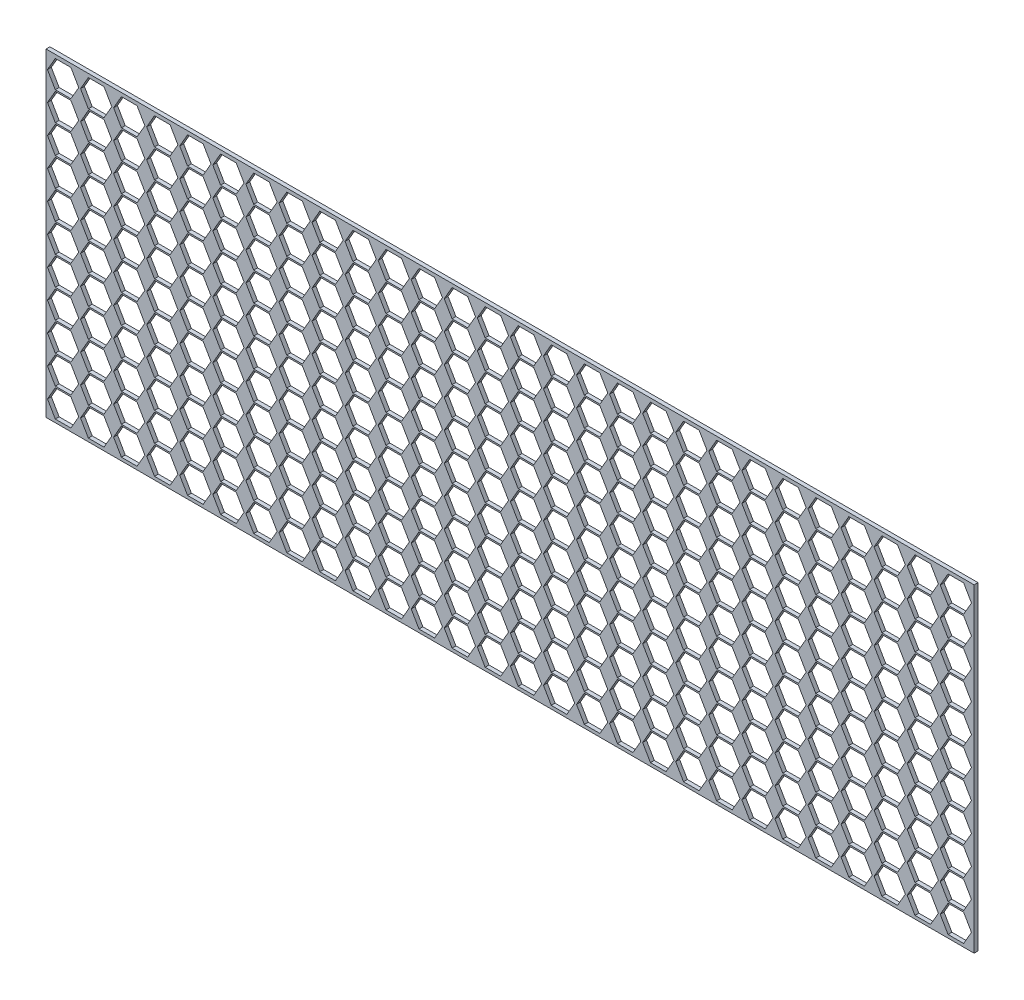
SolidWorks part; units mm, degrees
ref_plane "Alzado" through (0, 0, 0) normal (0, 0, 1) x (1, 0, 0)
ref_plane "Planta" through (0, 0, 0) normal (0, 1, 0) x (1, 0, 0)
ref_plane "Vista lateral" through (0, 0, 0) normal (1, 0, 0) x (0, 0, -1)
sketch "Croquis1" plane through (0, 0, 0) normal (0, 0, 1) x (1, 0, 0)
  line L1 (0, 0) -> (960, 0)
  line L2 (0, 0) -> (0, 330)
  line L3 (0, 330) -> (960, 330)
  line L4 (960, 0) -> (960, 330)
  dimension "D1" = 960
  dimension "D2" = 330
extrude "Saliente-Extruir1" add sketch "Croquis1" along normal blind 4
sketch "Croquis2" plane through (0, 0, 4) normal (0, 0, 1) x (1, 0, 0)
  line L0 (43.7948, 298.3223) -> (59.9606, 298.3223)
  line L1 (59.9606, 298.3223) -> (68.0435, 312.3223)
  line L2 (33.8435, 312.3223) -> (25.7606, 326.3223)
  line L3 (25.7606, 326.3223) -> (9.5948, 326.3223)
  line L4 (9.5948, 326.3223) -> (1.5119, 312.3223)
  line L5 (1.5119, 312.3223) -> (9.5948, 298.3223)
  line L6 (9.5948, 298.3223) -> (25.7606, 298.3223)
  line L7 (25.7606, 298.3223) -> (33.8435, 312.3223)
  line L8 (68.0435, 312.3223) -> (59.9606, 326.3223)
  line L9 (59.9606, 326.3223) -> (43.7948, 326.3223)
  line L10 (43.7948, 326.3223) -> (35.7119, 312.3223)
  line L11 (35.7119, 312.3223) -> (43.7948, 298.3223)
  line L12 (77.9948, 298.3223) -> (94.1606, 298.3223)
  line L13 (94.1606, 298.3223) -> (102.2435, 312.3223)
  line L14 (102.2435, 312.3223) -> (94.1606, 326.3223)
  line L15 (94.1606, 326.3223) -> (77.9948, 326.3223)
  line L16 (77.9948, 326.3223) -> (69.9119, 312.3223)
  line L17 (69.9119, 312.3223) -> (77.9948, 298.3223)
  line L18 (112.1948, 298.3223) -> (128.3606, 298.3223)
  line L19 (128.3606, 298.3223) -> (136.4435, 312.3223)
  line L20 (136.4435, 312.3223) -> (128.3606, 326.3223)
  line L21 (128.3606, 326.3223) -> (112.1948, 326.3223)
  line L22 (112.1948, 326.3223) -> (104.1119, 312.3223)
  line L23 (104.1119, 312.3223) -> (112.1948, 298.3223)
  line L24 (146.3948, 298.3223) -> (162.5606, 298.3223)
  line L25 (162.5606, 298.3223) -> (170.6435, 312.3223)
  line L26 (170.6435, 312.3223) -> (162.5606, 326.3223)
  line L27 (162.5606, 326.3223) -> (146.3948, 326.3223)
  line L28 (146.3948, 326.3223) -> (138.3119, 312.3223)
  line L29 (138.3119, 312.3223) -> (146.3948, 298.3223)
  line L30 (180.5948, 298.3223) -> (196.7606, 298.3223)
  line L31 (196.7606, 298.3223) -> (204.8435, 312.3223)
  line L32 (204.8435, 312.3223) -> (196.7606, 326.3223)
  line L33 (196.7606, 326.3223) -> (180.5948, 326.3223)
  line L34 (180.5948, 326.3223) -> (172.5119, 312.3223)
  line L35 (172.5119, 312.3223) -> (180.5948, 298.3223)
  line L36 (214.7948, 298.3223) -> (230.9606, 298.3223)
  line L37 (230.9606, 298.3223) -> (239.0435, 312.3223)
  line L38 (239.0435, 312.3223) -> (230.9606, 326.3223)
  line L39 (230.9606, 326.3223) -> (214.7948, 326.3223)
  line L40 (214.7948, 326.3223) -> (206.7119, 312.3223)
  line L41 (206.7119, 312.3223) -> (214.7948, 298.3223)
  line L42 (248.9948, 298.3223) -> (265.1606, 298.3223)
  line L43 (265.1606, 298.3223) -> (273.2435, 312.3223)
  line L44 (273.2435, 312.3223) -> (265.1606, 326.3223)
  line L45 (265.1606, 326.3223) -> (248.9948, 326.3223)
  line L46 (248.9948, 326.3223) -> (240.9119, 312.3223)
  line L47 (240.9119, 312.3223) -> (248.9948, 298.3223)
  line L48 (283.1948, 298.3223) -> (299.3606, 298.3223)
  line L49 (299.3606, 298.3223) -> (307.4435, 312.3223)
  line L50 (307.4435, 312.3223) -> (299.3606, 326.3223)
  line L51 (299.3606, 326.3223) -> (283.1948, 326.3223)
  line L52 (283.1948, 326.3223) -> (275.1119, 312.3223)
  line L53 (275.1119, 312.3223) -> (283.1948, 298.3223)
  line L54 (317.3948, 298.3223) -> (333.5606, 298.3223)
  line L55 (333.5606, 298.3223) -> (341.6435, 312.3223)
  line L56 (341.6435, 312.3223) -> (333.5606, 326.3223)
  line L57 (333.5606, 326.3223) -> (317.3948, 326.3223)
  line L58 (317.3948, 326.3223) -> (309.3119, 312.3223)
  line L59 (309.3119, 312.3223) -> (317.3948, 298.3223)
  line L60 (351.5948, 298.3223) -> (367.7606, 298.3223)
  line L61 (367.7606, 298.3223) -> (375.8435, 312.3223)
  line L62 (375.8435, 312.3223) -> (367.7606, 326.3223)
  line L63 (367.7606, 326.3223) -> (351.5948, 326.3223)
  line L64 (351.5948, 326.3223) -> (343.5119, 312.3223)
  line L65 (343.5119, 312.3223) -> (351.5948, 298.3223)
  line L66 (385.7948, 298.3223) -> (401.9606, 298.3223)
  line L67 (401.9606, 298.3223) -> (410.0435, 312.3223)
  line L68 (410.0435, 312.3223) -> (401.9606, 326.3223)
  line L69 (401.9606, 326.3223) -> (385.7948, 326.3223)
  line L70 (385.7948, 326.3223) -> (377.7119, 312.3223)
  line L71 (377.7119, 312.3223) -> (385.7948, 298.3223)
  line L72 (419.9948, 298.3223) -> (436.1606, 298.3223)
  line L73 (436.1606, 298.3223) -> (444.2435, 312.3223)
  line L74 (444.2435, 312.3223) -> (436.1606, 326.3223)
  line L75 (436.1606, 326.3223) -> (419.9948, 326.3223)
  line L76 (419.9948, 326.3223) -> (411.9119, 312.3223)
  line L77 (411.9119, 312.3223) -> (419.9948, 298.3223)
  line L78 (454.1948, 298.3223) -> (470.3606, 298.3223)
  line L79 (470.3606, 298.3223) -> (478.4435, 312.3223)
  line L80 (478.4435, 312.3223) -> (470.3606, 326.3223)
  line L81 (470.3606, 326.3223) -> (454.1948, 326.3223)
  line L82 (454.1948, 326.3223) -> (446.1119, 312.3223)
  line L83 (446.1119, 312.3223) -> (454.1948, 298.3223)
  line L84 (488.3948, 298.3223) -> (504.5606, 298.3223)
  line L85 (504.5606, 298.3223) -> (512.6435, 312.3223)
  line L86 (512.6435, 312.3223) -> (504.5606, 326.3223)
  line L87 (504.5606, 326.3223) -> (488.3948, 326.3223)
  line L88 (488.3948, 326.3223) -> (480.3119, 312.3223)
  line L89 (480.3119, 312.3223) -> (488.3948, 298.3223)
  line L90 (522.5948, 298.3223) -> (538.7606, 298.3223)
  line L91 (538.7606, 298.3223) -> (546.8435, 312.3223)
  line L92 (546.8435, 312.3223) -> (538.7606, 326.3223)
  line L93 (538.7606, 326.3223) -> (522.5948, 326.3223)
  line L94 (522.5948, 326.3223) -> (514.5119, 312.3223)
  line L95 (514.5119, 312.3223) -> (522.5948, 298.3223)
  line L96 (556.7948, 298.3223) -> (572.9606, 298.3223)
  line L97 (572.9606, 298.3223) -> (581.0435, 312.3223)
  line L98 (581.0435, 312.3223) -> (572.9606, 326.3223)
  line L99 (572.9606, 326.3223) -> (556.7948, 326.3223)
  line L100 (556.7948, 326.3223) -> (548.7119, 312.3223)
  line L101 (548.7119, 312.3223) -> (556.7948, 298.3223)
  line L102 (590.9948, 298.3223) -> (607.1606, 298.3223)
  line L103 (607.1606, 298.3223) -> (615.2435, 312.3223)
  line L104 (615.2435, 312.3223) -> (607.1606, 326.3223)
  line L105 (607.1606, 326.3223) -> (590.9948, 326.3223)
  line L106 (590.9948, 326.3223) -> (582.9119, 312.3223)
  line L107 (582.9119, 312.3223) -> (590.9948, 298.3223)
  line L108 (625.1948, 298.3223) -> (641.3606, 298.3223)
  line L109 (641.3606, 298.3223) -> (649.4435, 312.3223)
  line L110 (649.4435, 312.3223) -> (641.3606, 326.3223)
  line L111 (641.3606, 326.3223) -> (625.1948, 326.3223)
  line L112 (625.1948, 326.3223) -> (617.1119, 312.3223)
  line L113 (617.1119, 312.3223) -> (625.1948, 298.3223)
  line L114 (659.3948, 298.3223) -> (675.5606, 298.3223)
  line L115 (675.5606, 298.3223) -> (683.6435, 312.3223)
  line L116 (683.6435, 312.3223) -> (675.5606, 326.3223)
  line L117 (675.5606, 326.3223) -> (659.3948, 326.3223)
  line L118 (659.3948, 326.3223) -> (651.3119, 312.3223)
  line L119 (651.3119, 312.3223) -> (659.3948, 298.3223)
  line L120 (693.5948, 298.3223) -> (709.7606, 298.3223)
  line L121 (709.7606, 298.3223) -> (717.8435, 312.3223)
  line L122 (717.8435, 312.3223) -> (709.7606, 326.3223)
  line L123 (709.7606, 326.3223) -> (693.5948, 326.3223)
  line L124 (693.5948, 326.3223) -> (685.5119, 312.3223)
  line L125 (685.5119, 312.3223) -> (693.5948, 298.3223)
  line L126 (727.7948, 298.3223) -> (743.9606, 298.3223)
  line L127 (743.9606, 298.3223) -> (752.0435, 312.3223)
  line L128 (752.0435, 312.3223) -> (743.9606, 326.3223)
  line L129 (743.9606, 326.3223) -> (727.7948, 326.3223)
  line L130 (727.7948, 326.3223) -> (719.7119, 312.3223)
  line L131 (719.7119, 312.3223) -> (727.7948, 298.3223)
  line L132 (761.9948, 298.3223) -> (778.1606, 298.3223)
  line L133 (778.1606, 298.3223) -> (786.2435, 312.3223)
  line L134 (786.2435, 312.3223) -> (778.1606, 326.3223)
  line L135 (778.1606, 326.3223) -> (761.9948, 326.3223)
  line L136 (761.9948, 326.3223) -> (753.9119, 312.3223)
  line L137 (753.9119, 312.3223) -> (761.9948, 298.3223)
  line L138 (796.1948, 298.3223) -> (812.3606, 298.3223)
  line L139 (812.3606, 298.3223) -> (820.4435, 312.3223)
  line L140 (820.4435, 312.3223) -> (812.3606, 326.3223)
  line L141 (812.3606, 326.3223) -> (796.1948, 326.3223)
  line L142 (796.1948, 326.3223) -> (788.1119, 312.3223)
  line L143 (788.1119, 312.3223) -> (796.1948, 298.3223)
  line L144 (830.3948, 298.3223) -> (846.5606, 298.3223)
  line L145 (846.5606, 298.3223) -> (854.6435, 312.3223)
  line L146 (854.6435, 312.3223) -> (846.5606, 326.3223)
  line L147 (846.5606, 326.3223) -> (830.3948, 326.3223)
  line L148 (830.3948, 326.3223) -> (822.3119, 312.3223)
  line L149 (822.3119, 312.3223) -> (830.3948, 298.3223)
  line L150 (864.5948, 298.3223) -> (880.7606, 298.3223)
  line L151 (880.7606, 298.3223) -> (888.8435, 312.3223)
  line L152 (888.8435, 312.3223) -> (880.7606, 326.3223)
  line L153 (880.7606, 326.3223) -> (864.5948, 326.3223)
  line L154 (864.5948, 326.3223) -> (856.5119, 312.3223)
  line L155 (856.5119, 312.3223) -> (864.5948, 298.3223)
  line L156 (898.7948, 298.3223) -> (914.9606, 298.3223)
  line L157 (914.9606, 298.3223) -> (923.0435, 312.3223)
  line L158 (923.0435, 312.3223) -> (914.9606, 326.3223)
  line L159 (914.9606, 326.3223) -> (898.7948, 326.3223)
  line L160 (898.7948, 326.3223) -> (890.7119, 312.3223)
  line L161 (890.7119, 312.3223) -> (898.7948, 298.3223)
  line L162 (932.9948, 298.3223) -> (949.1606, 298.3223)
  line L163 (949.1606, 298.3223) -> (957.2435, 312.3223)
  line L164 (957.2435, 312.3223) -> (949.1606, 326.3223)
  line L165 (949.1606, 326.3223) -> (932.9948, 326.3223)
  line L166 (932.9948, 326.3223) -> (924.9119, 312.3223)
  line L167 (924.9119, 312.3223) -> (932.9948, 298.3223)
  line L168 (9.5948, 268.8223) -> (25.7606, 268.8223)
  line L169 (25.7606, 268.8223) -> (33.8435, 282.8223)
  line L170 (33.8435, 282.8223) -> (25.7606, 296.8223)
  line L171 (25.7606, 296.8223) -> (9.5948, 296.8223)
  line L172 (9.5948, 296.8223) -> (1.5119, 282.8223)
  line L173 (1.5119, 282.8223) -> (9.5948, 268.8223)
  line L174 (43.7948, 268.8223) -> (59.9606, 268.8223)
  line L175 (59.9606, 268.8223) -> (68.0435, 282.8223)
  line L176 (68.0435, 282.8223) -> (59.9606, 296.8223)
  line L177 (59.9606, 296.8223) -> (43.7948, 296.8223)
  line L178 (43.7948, 296.8223) -> (35.7119, 282.8223)
  line L179 (35.7119, 282.8223) -> (43.7948, 268.8223)
  line L180 (77.9948, 268.8223) -> (94.1606, 268.8223)
  line L181 (94.1606, 268.8223) -> (102.2435, 282.8223)
  line L182 (102.2435, 282.8223) -> (94.1606, 296.8223)
  line L183 (94.1606, 296.8223) -> (77.9948, 296.8223)
  line L184 (77.9948, 296.8223) -> (69.9119, 282.8223)
  line L185 (69.9119, 282.8223) -> (77.9948, 268.8223)
  line L186 (112.1948, 268.8223) -> (128.3606, 268.8223)
  line L187 (128.3606, 268.8223) -> (136.4435, 282.8223)
  line L188 (136.4435, 282.8223) -> (128.3606, 296.8223)
  line L189 (128.3606, 296.8223) -> (112.1948, 296.8223)
  line L190 (112.1948, 296.8223) -> (104.1119, 282.8223)
  line L191 (104.1119, 282.8223) -> (112.1948, 268.8223)
  line L192 (146.3948, 268.8223) -> (162.5606, 268.8223)
  line L193 (162.5606, 268.8223) -> (170.6435, 282.8223)
  line L194 (170.6435, 282.8223) -> (162.5606, 296.8223)
  line L195 (162.5606, 296.8223) -> (146.3948, 296.8223)
  line L196 (146.3948, 296.8223) -> (138.3119, 282.8223)
  line L197 (138.3119, 282.8223) -> (146.3948, 268.8223)
  line L198 (180.5948, 268.8223) -> (196.7606, 268.8223)
  line L199 (196.7606, 268.8223) -> (204.8435, 282.8223)
  line L200 (204.8435, 282.8223) -> (196.7606, 296.8223)
  line L201 (196.7606, 296.8223) -> (180.5948, 296.8223)
  line L202 (180.5948, 296.8223) -> (172.5119, 282.8223)
  line L203 (172.5119, 282.8223) -> (180.5948, 268.8223)
  line L204 (214.7948, 268.8223) -> (230.9606, 268.8223)
  line L205 (230.9606, 268.8223) -> (239.0435, 282.8223)
  line L206 (239.0435, 282.8223) -> (230.9606, 296.8223)
  line L207 (230.9606, 296.8223) -> (214.7948, 296.8223)
  line L208 (214.7948, 296.8223) -> (206.7119, 282.8223)
  line L209 (206.7119, 282.8223) -> (214.7948, 268.8223)
  line L210 (248.9948, 268.8223) -> (265.1606, 268.8223)
  line L211 (265.1606, 268.8223) -> (273.2435, 282.8223)
  line L212 (273.2435, 282.8223) -> (265.1606, 296.8223)
  line L213 (265.1606, 296.8223) -> (248.9948, 296.8223)
  line L214 (248.9948, 296.8223) -> (240.9119, 282.8223)
  line L215 (240.9119, 282.8223) -> (248.9948, 268.8223)
  line L216 (283.1948, 268.8223) -> (299.3606, 268.8223)
  line L217 (299.3606, 268.8223) -> (307.4435, 282.8223)
  line L218 (307.4435, 282.8223) -> (299.3606, 296.8223)
  line L219 (299.3606, 296.8223) -> (283.1948, 296.8223)
  line L220 (283.1948, 296.8223) -> (275.1119, 282.8223)
  line L221 (275.1119, 282.8223) -> (283.1948, 268.8223)
  line L222 (317.3948, 268.8223) -> (333.5606, 268.8223)
  line L223 (333.5606, 268.8223) -> (341.6435, 282.8223)
  line L224 (341.6435, 282.8223) -> (333.5606, 296.8223)
  line L225 (333.5606, 296.8223) -> (317.3948, 296.8223)
  line L226 (317.3948, 296.8223) -> (309.3119, 282.8223)
  line L227 (309.3119, 282.8223) -> (317.3948, 268.8223)
  line L228 (351.5948, 268.8223) -> (367.7606, 268.8223)
  line L229 (367.7606, 268.8223) -> (375.8435, 282.8223)
  line L230 (375.8435, 282.8223) -> (367.7606, 296.8223)
  line L231 (367.7606, 296.8223) -> (351.5948, 296.8223)
  line L232 (351.5948, 296.8223) -> (343.5119, 282.8223)
  line L233 (343.5119, 282.8223) -> (351.5948, 268.8223)
  line L234 (385.7948, 268.8223) -> (401.9606, 268.8223)
  line L235 (401.9606, 268.8223) -> (410.0435, 282.8223)
  line L236 (410.0435, 282.8223) -> (401.9606, 296.8223)
  line L237 (401.9606, 296.8223) -> (385.7948, 296.8223)
  line L238 (385.7948, 296.8223) -> (377.7119, 282.8223)
  line L239 (377.7119, 282.8223) -> (385.7948, 268.8223)
  line L240 (419.9948, 268.8223) -> (436.1606, 268.8223)
  line L241 (436.1606, 268.8223) -> (444.2435, 282.8223)
  line L242 (444.2435, 282.8223) -> (436.1606, 296.8223)
  line L243 (436.1606, 296.8223) -> (419.9948, 296.8223)
  line L244 (419.9948, 296.8223) -> (411.9119, 282.8223)
  line L245 (411.9119, 282.8223) -> (419.9948, 268.8223)
  line L246 (454.1948, 268.8223) -> (470.3606, 268.8223)
  line L247 (470.3606, 268.8223) -> (478.4435, 282.8223)
  line L248 (478.4435, 282.8223) -> (470.3606, 296.8223)
  line L249 (470.3606, 296.8223) -> (454.1948, 296.8223)
  line L250 (454.1948, 296.8223) -> (446.1119, 282.8223)
  line L251 (446.1119, 282.8223) -> (454.1948, 268.8223)
  line L252 (488.3948, 268.8223) -> (504.5606, 268.8223)
  line L253 (504.5606, 268.8223) -> (512.6435, 282.8223)
  line L254 (512.6435, 282.8223) -> (504.5606, 296.8223)
  line L255 (504.5606, 296.8223) -> (488.3948, 296.8223)
  line L256 (488.3948, 296.8223) -> (480.3119, 282.8223)
  line L257 (480.3119, 282.8223) -> (488.3948, 268.8223)
  line L258 (522.5948, 268.8223) -> (538.7606, 268.8223)
  line L259 (538.7606, 268.8223) -> (546.8435, 282.8223)
  line L260 (546.8435, 282.8223) -> (538.7606, 296.8223)
  line L261 (538.7606, 296.8223) -> (522.5948, 296.8223)
  line L262 (522.5948, 296.8223) -> (514.5119, 282.8223)
  line L263 (514.5119, 282.8223) -> (522.5948, 268.8223)
  line L264 (556.7948, 268.8223) -> (572.9606, 268.8223)
  line L265 (572.9606, 268.8223) -> (581.0435, 282.8223)
  line L266 (581.0435, 282.8223) -> (572.9606, 296.8223)
  line L267 (572.9606, 296.8223) -> (556.7948, 296.8223)
  line L268 (556.7948, 296.8223) -> (548.7119, 282.8223)
  line L269 (548.7119, 282.8223) -> (556.7948, 268.8223)
  line L270 (590.9948, 268.8223) -> (607.1606, 268.8223)
  line L271 (607.1606, 268.8223) -> (615.2435, 282.8223)
  line L272 (615.2435, 282.8223) -> (607.1606, 296.8223)
  line L273 (607.1606, 296.8223) -> (590.9948, 296.8223)
  line L274 (590.9948, 296.8223) -> (582.9119, 282.8223)
  line L275 (582.9119, 282.8223) -> (590.9948, 268.8223)
  line L276 (625.1948, 268.8223) -> (641.3606, 268.8223)
  line L277 (641.3606, 268.8223) -> (649.4435, 282.8223)
  line L278 (649.4435, 282.8223) -> (641.3606, 296.8223)
  line L279 (641.3606, 296.8223) -> (625.1948, 296.8223)
  line L280 (625.1948, 296.8223) -> (617.1119, 282.8223)
  line L281 (617.1119, 282.8223) -> (625.1948, 268.8223)
  line L282 (659.3948, 268.8223) -> (675.5606, 268.8223)
  line L283 (675.5606, 268.8223) -> (683.6435, 282.8223)
  line L284 (683.6435, 282.8223) -> (675.5606, 296.8223)
  line L285 (675.5606, 296.8223) -> (659.3948, 296.8223)
  line L286 (659.3948, 296.8223) -> (651.3119, 282.8223)
  line L287 (651.3119, 282.8223) -> (659.3948, 268.8223)
  line L288 (693.5948, 268.8223) -> (709.7606, 268.8223)
  line L289 (709.7606, 268.8223) -> (717.8435, 282.8223)
  line L290 (717.8435, 282.8223) -> (709.7606, 296.8223)
  line L291 (709.7606, 296.8223) -> (693.5948, 296.8223)
  line L292 (693.5948, 296.8223) -> (685.5119, 282.8223)
  line L293 (685.5119, 282.8223) -> (693.5948, 268.8223)
  line L294 (727.7948, 268.8223) -> (743.9606, 268.8223)
  line L295 (743.9606, 268.8223) -> (752.0435, 282.8223)
  line L296 (752.0435, 282.8223) -> (743.9606, 296.8223)
  line L297 (743.9606, 296.8223) -> (727.7948, 296.8223)
  line L298 (727.7948, 296.8223) -> (719.7119, 282.8223)
  line L299 (719.7119, 282.8223) -> (727.7948, 268.8223)
  line L300 (761.9948, 268.8223) -> (778.1606, 268.8223)
  line L301 (778.1606, 268.8223) -> (786.2435, 282.8223)
  line L302 (786.2435, 282.8223) -> (778.1606, 296.8223)
  line L303 (778.1606, 296.8223) -> (761.9948, 296.8223)
  line L304 (761.9948, 296.8223) -> (753.9119, 282.8223)
  line L305 (753.9119, 282.8223) -> (761.9948, 268.8223)
  line L306 (796.1948, 268.8223) -> (812.3606, 268.8223)
  line L307 (812.3606, 268.8223) -> (820.4435, 282.8223)
  line L308 (820.4435, 282.8223) -> (812.3606, 296.8223)
  line L309 (812.3606, 296.8223) -> (796.1948, 296.8223)
  line L310 (796.1948, 296.8223) -> (788.1119, 282.8223)
  line L311 (788.1119, 282.8223) -> (796.1948, 268.8223)
  line L312 (830.3948, 268.8223) -> (846.5606, 268.8223)
  line L313 (846.5606, 268.8223) -> (854.6435, 282.8223)
  line L314 (854.6435, 282.8223) -> (846.5606, 296.8223)
  line L315 (846.5606, 296.8223) -> (830.3948, 296.8223)
  line L316 (830.3948, 296.8223) -> (822.3119, 282.8223)
  line L317 (822.3119, 282.8223) -> (830.3948, 268.8223)
  line L318 (864.5948, 268.8223) -> (880.7606, 268.8223)
  line L319 (880.7606, 268.8223) -> (888.8435, 282.8223)
  line L320 (888.8435, 282.8223) -> (880.7606, 296.8223)
  line L321 (880.7606, 296.8223) -> (864.5948, 296.8223)
  line L322 (864.5948, 296.8223) -> (856.5119, 282.8223)
  line L323 (856.5119, 282.8223) -> (864.5948, 268.8223)
  line L324 (898.7948, 268.8223) -> (914.9606, 268.8223)
  line L325 (914.9606, 268.8223) -> (923.0435, 282.8223)
  line L326 (923.0435, 282.8223) -> (914.9606, 296.8223)
  line L327 (914.9606, 296.8223) -> (898.7948, 296.8223)
  line L328 (898.7948, 296.8223) -> (890.7119, 282.8223)
  line L329 (890.7119, 282.8223) -> (898.7948, 268.8223)
  line L330 (932.9948, 268.8223) -> (949.1606, 268.8223)
  line L331 (949.1606, 268.8223) -> (957.2435, 282.8223)
  line L332 (957.2435, 282.8223) -> (949.1606, 296.8223)
  line L333 (949.1606, 296.8223) -> (932.9948, 296.8223)
  line L334 (932.9948, 296.8223) -> (924.9119, 282.8223)
  line L335 (924.9119, 282.8223) -> (932.9948, 268.8223)
  line L336 (9.5948, 239.3223) -> (25.7606, 239.3223)
  line L337 (25.7606, 239.3223) -> (33.8435, 253.3223)
  line L338 (33.8435, 253.3223) -> (25.7606, 267.3223)
  line L339 (25.7606, 267.3223) -> (9.5948, 267.3223)
  line L340 (9.5948, 267.3223) -> (1.5119, 253.3223)
  line L341 (1.5119, 253.3223) -> (9.5948, 239.3223)
  line L342 (43.7948, 239.3223) -> (59.9606, 239.3223)
  line L343 (59.9606, 239.3223) -> (68.0435, 253.3223)
  line L344 (68.0435, 253.3223) -> (59.9606, 267.3223)
  line L345 (59.9606, 267.3223) -> (43.7948, 267.3223)
  line L346 (43.7948, 267.3223) -> (35.7119, 253.3223)
  line L347 (35.7119, 253.3223) -> (43.7948, 239.3223)
  line L348 (77.9948, 239.3223) -> (94.1606, 239.3223)
  line L349 (94.1606, 239.3223) -> (102.2435, 253.3223)
  line L350 (102.2435, 253.3223) -> (94.1606, 267.3223)
  line L351 (94.1606, 267.3223) -> (77.9948, 267.3223)
  line L352 (77.9948, 267.3223) -> (69.9119, 253.3223)
  line L353 (69.9119, 253.3223) -> (77.9948, 239.3223)
  line L354 (112.1948, 239.3223) -> (128.3606, 239.3223)
  line L355 (128.3606, 239.3223) -> (136.4435, 253.3223)
  line L356 (136.4435, 253.3223) -> (128.3606, 267.3223)
  line L357 (128.3606, 267.3223) -> (112.1948, 267.3223)
  line L358 (112.1948, 267.3223) -> (104.1119, 253.3223)
  line L359 (104.1119, 253.3223) -> (112.1948, 239.3223)
  line L360 (146.3948, 239.3223) -> (162.5606, 239.3223)
  line L361 (162.5606, 239.3223) -> (170.6435, 253.3223)
  line L362 (170.6435, 253.3223) -> (162.5606, 267.3223)
  line L363 (162.5606, 267.3223) -> (146.3948, 267.3223)
  line L364 (146.3948, 267.3223) -> (138.3119, 253.3223)
  line L365 (138.3119, 253.3223) -> (146.3948, 239.3223)
  line L366 (180.5948, 239.3223) -> (196.7606, 239.3223)
  line L367 (196.7606, 239.3223) -> (204.8435, 253.3223)
  line L368 (204.8435, 253.3223) -> (196.7606, 267.3223)
  line L369 (196.7606, 267.3223) -> (180.5948, 267.3223)
  line L370 (180.5948, 267.3223) -> (172.5119, 253.3223)
  line L371 (172.5119, 253.3223) -> (180.5948, 239.3223)
  line L372 (214.7948, 239.3223) -> (230.9606, 239.3223)
  line L373 (230.9606, 239.3223) -> (239.0435, 253.3223)
  line L374 (239.0435, 253.3223) -> (230.9606, 267.3223)
  line L375 (230.9606, 267.3223) -> (214.7948, 267.3223)
  line L376 (214.7948, 267.3223) -> (206.7119, 253.3223)
  line L377 (206.7119, 253.3223) -> (214.7948, 239.3223)
  line L378 (248.9948, 239.3223) -> (265.1606, 239.3223)
  line L379 (265.1606, 239.3223) -> (273.2435, 253.3223)
  line L380 (273.2435, 253.3223) -> (265.1606, 267.3223)
  line L381 (265.1606, 267.3223) -> (248.9948, 267.3223)
  line L382 (248.9948, 267.3223) -> (240.9119, 253.3223)
  line L383 (240.9119, 253.3223) -> (248.9948, 239.3223)
  line L384 (283.1948, 239.3223) -> (299.3606, 239.3223)
  line L385 (299.3606, 239.3223) -> (307.4435, 253.3223)
  line L386 (307.4435, 253.3223) -> (299.3606, 267.3223)
  line L387 (299.3606, 267.3223) -> (283.1948, 267.3223)
  line L388 (283.1948, 267.3223) -> (275.1119, 253.3223)
  line L389 (275.1119, 253.3223) -> (283.1948, 239.3223)
  line L390 (317.3948, 239.3223) -> (333.5606, 239.3223)
  line L391 (333.5606, 239.3223) -> (341.6435, 253.3223)
  line L392 (341.6435, 253.3223) -> (333.5606, 267.3223)
  line L393 (333.5606, 267.3223) -> (317.3948, 267.3223)
  line L394 (317.3948, 267.3223) -> (309.3119, 253.3223)
  line L395 (309.3119, 253.3223) -> (317.3948, 239.3223)
  line L396 (351.5948, 239.3223) -> (367.7606, 239.3223)
  line L397 (367.7606, 239.3223) -> (375.8435, 253.3223)
  line L398 (375.8435, 253.3223) -> (367.7606, 267.3223)
  line L399 (367.7606, 267.3223) -> (351.5948, 267.3223)
  line L400 (351.5948, 267.3223) -> (343.5119, 253.3223)
  line L401 (343.5119, 253.3223) -> (351.5948, 239.3223)
  line L402 (385.7948, 239.3223) -> (401.9606, 239.3223)
  line L403 (401.9606, 239.3223) -> (410.0435, 253.3223)
  line L404 (410.0435, 253.3223) -> (401.9606, 267.3223)
  line L405 (401.9606, 267.3223) -> (385.7948, 267.3223)
  line L406 (385.7948, 267.3223) -> (377.7119, 253.3223)
  line L407 (377.7119, 253.3223) -> (385.7948, 239.3223)
  line L408 (419.9948, 239.3223) -> (436.1606, 239.3223)
  line L409 (436.1606, 239.3223) -> (444.2435, 253.3223)
  line L410 (444.2435, 253.3223) -> (436.1606, 267.3223)
  line L411 (436.1606, 267.3223) -> (419.9948, 267.3223)
  line L412 (419.9948, 267.3223) -> (411.9119, 253.3223)
  line L413 (411.9119, 253.3223) -> (419.9948, 239.3223)
  line L414 (454.1948, 239.3223) -> (470.3606, 239.3223)
  line L415 (470.3606, 239.3223) -> (478.4435, 253.3223)
  line L416 (478.4435, 253.3223) -> (470.3606, 267.3223)
  line L417 (470.3606, 267.3223) -> (454.1948, 267.3223)
  line L418 (454.1948, 267.3223) -> (446.1119, 253.3223)
  line L419 (446.1119, 253.3223) -> (454.1948, 239.3223)
  line L420 (488.3948, 239.3223) -> (504.5606, 239.3223)
  line L421 (504.5606, 239.3223) -> (512.6435, 253.3223)
  line L422 (512.6435, 253.3223) -> (504.5606, 267.3223)
  line L423 (504.5606, 267.3223) -> (488.3948, 267.3223)
  line L424 (488.3948, 267.3223) -> (480.3119, 253.3223)
  line L425 (480.3119, 253.3223) -> (488.3948, 239.3223)
  line L426 (522.5948, 239.3223) -> (538.7606, 239.3223)
  line L427 (538.7606, 239.3223) -> (546.8435, 253.3223)
  line L428 (546.8435, 253.3223) -> (538.7606, 267.3223)
  line L429 (538.7606, 267.3223) -> (522.5948, 267.3223)
  line L430 (522.5948, 267.3223) -> (514.5119, 253.3223)
  line L431 (514.5119, 253.3223) -> (522.5948, 239.3223)
  line L432 (556.7948, 239.3223) -> (572.9606, 239.3223)
  line L433 (572.9606, 239.3223) -> (581.0435, 253.3223)
  line L434 (581.0435, 253.3223) -> (572.9606, 267.3223)
  line L435 (572.9606, 267.3223) -> (556.7948, 267.3223)
  line L436 (556.7948, 267.3223) -> (548.7119, 253.3223)
  line L437 (548.7119, 253.3223) -> (556.7948, 239.3223)
  line L438 (590.9948, 239.3223) -> (607.1606, 239.3223)
  line L439 (607.1606, 239.3223) -> (615.2435, 253.3223)
  line L440 (615.2435, 253.3223) -> (607.1606, 267.3223)
  line L441 (607.1606, 267.3223) -> (590.9948, 267.3223)
  line L442 (590.9948, 267.3223) -> (582.9119, 253.3223)
  line L443 (582.9119, 253.3223) -> (590.9948, 239.3223)
  line L444 (625.1948, 239.3223) -> (641.3606, 239.3223)
  line L445 (641.3606, 239.3223) -> (649.4435, 253.3223)
  line L446 (649.4435, 253.3223) -> (641.3606, 267.3223)
  line L447 (641.3606, 267.3223) -> (625.1948, 267.3223)
  line L448 (625.1948, 267.3223) -> (617.1119, 253.3223)
  line L449 (617.1119, 253.3223) -> (625.1948, 239.3223)
  line L450 (659.3948, 239.3223) -> (675.5606, 239.3223)
  line L451 (675.5606, 239.3223) -> (683.6435, 253.3223)
  line L452 (683.6435, 253.3223) -> (675.5606, 267.3223)
  line L453 (675.5606, 267.3223) -> (659.3948, 267.3223)
  line L454 (659.3948, 267.3223) -> (651.3119, 253.3223)
  line L455 (651.3119, 253.3223) -> (659.3948, 239.3223)
  line L456 (693.5948, 239.3223) -> (709.7606, 239.3223)
  line L457 (709.7606, 239.3223) -> (717.8435, 253.3223)
  line L458 (717.8435, 253.3223) -> (709.7606, 267.3223)
  line L459 (709.7606, 267.3223) -> (693.5948, 267.3223)
  line L460 (693.5948, 267.3223) -> (685.5119, 253.3223)
  line L461 (685.5119, 253.3223) -> (693.5948, 239.3223)
  line L462 (727.7948, 239.3223) -> (743.9606, 239.3223)
  line L463 (743.9606, 239.3223) -> (752.0435, 253.3223)
  line L464 (752.0435, 253.3223) -> (743.9606, 267.3223)
  line L465 (743.9606, 267.3223) -> (727.7948, 267.3223)
  line L466 (727.7948, 267.3223) -> (719.7119, 253.3223)
  line L467 (719.7119, 253.3223) -> (727.7948, 239.3223)
  line L468 (761.9948, 239.3223) -> (778.1606, 239.3223)
  line L469 (778.1606, 239.3223) -> (786.2435, 253.3223)
  line L470 (786.2435, 253.3223) -> (778.1606, 267.3223)
  line L471 (778.1606, 267.3223) -> (761.9948, 267.3223)
  line L472 (761.9948, 267.3223) -> (753.9119, 253.3223)
  line L473 (753.9119, 253.3223) -> (761.9948, 239.3223)
  line L474 (796.1948, 239.3223) -> (812.3606, 239.3223)
  line L475 (812.3606, 239.3223) -> (820.4435, 253.3223)
  line L476 (820.4435, 253.3223) -> (812.3606, 267.3223)
  line L477 (812.3606, 267.3223) -> (796.1948, 267.3223)
  line L478 (796.1948, 267.3223) -> (788.1119, 253.3223)
  line L479 (788.1119, 253.3223) -> (796.1948, 239.3223)
  line L480 (830.3948, 239.3223) -> (846.5606, 239.3223)
  line L481 (846.5606, 239.3223) -> (854.6435, 253.3223)
  line L482 (854.6435, 253.3223) -> (846.5606, 267.3223)
  line L483 (846.5606, 267.3223) -> (830.3948, 267.3223)
  line L484 (830.3948, 267.3223) -> (822.3119, 253.3223)
  line L485 (822.3119, 253.3223) -> (830.3948, 239.3223)
  line L486 (864.5948, 239.3223) -> (880.7606, 239.3223)
  line L487 (880.7606, 239.3223) -> (888.8435, 253.3223)
  line L488 (888.8435, 253.3223) -> (880.7606, 267.3223)
  line L489 (880.7606, 267.3223) -> (864.5948, 267.3223)
  line L490 (864.5948, 267.3223) -> (856.5119, 253.3223)
  line L491 (856.5119, 253.3223) -> (864.5948, 239.3223)
  line L492 (898.7948, 239.3223) -> (914.9606, 239.3223)
  line L493 (914.9606, 239.3223) -> (923.0435, 253.3223)
  line L494 (923.0435, 253.3223) -> (914.9606, 267.3223)
  line L495 (914.9606, 267.3223) -> (898.7948, 267.3223)
  line L496 (898.7948, 267.3223) -> (890.7119, 253.3223)
  line L497 (890.7119, 253.3223) -> (898.7948, 239.3223)
  line L498 (932.9948, 239.3223) -> (949.1606, 239.3223)
  line L499 (949.1606, 239.3223) -> (957.2435, 253.3223)
  line L500 (957.2435, 253.3223) -> (949.1606, 267.3223)
  line L501 (949.1606, 267.3223) -> (932.9948, 267.3223)
  line L502 (932.9948, 267.3223) -> (924.9119, 253.3223)
  line L503 (924.9119, 253.3223) -> (932.9948, 239.3223)
  line L504 (9.5948, 209.8223) -> (25.7606, 209.8223)
  line L505 (25.7606, 209.8223) -> (33.8435, 223.8223)
  line L506 (33.8435, 223.8223) -> (25.7606, 237.8223)
  line L507 (25.7606, 237.8223) -> (9.5948, 237.8223)
  line L508 (9.5948, 237.8223) -> (1.5119, 223.8223)
  line L509 (1.5119, 223.8223) -> (9.5948, 209.8223)
  line L510 (43.7948, 209.8223) -> (59.9606, 209.8223)
  line L511 (59.9606, 209.8223) -> (68.0435, 223.8223)
  line L512 (68.0435, 223.8223) -> (59.9606, 237.8223)
  line L513 (59.9606, 237.8223) -> (43.7948, 237.8223)
  line L514 (43.7948, 237.8223) -> (35.7119, 223.8223)
  line L515 (35.7119, 223.8223) -> (43.7948, 209.8223)
  line L516 (77.9948, 209.8223) -> (94.1606, 209.8223)
  line L517 (94.1606, 209.8223) -> (102.2435, 223.8223)
  line L518 (102.2435, 223.8223) -> (94.1606, 237.8223)
  line L519 (94.1606, 237.8223) -> (77.9948, 237.8223)
  line L520 (77.9948, 237.8223) -> (69.9119, 223.8223)
  line L521 (69.9119, 223.8223) -> (77.9948, 209.8223)
  line L522 (112.1948, 209.8223) -> (128.3606, 209.8223)
  line L523 (128.3606, 209.8223) -> (136.4435, 223.8223)
  line L524 (136.4435, 223.8223) -> (128.3606, 237.8223)
  line L525 (128.3606, 237.8223) -> (112.1948, 237.8223)
  line L526 (112.1948, 237.8223) -> (104.1119, 223.8223)
  line L527 (104.1119, 223.8223) -> (112.1948, 209.8223)
  line L528 (146.3948, 209.8223) -> (162.5606, 209.8223)
  line L529 (162.5606, 209.8223) -> (170.6435, 223.8223)
  line L530 (170.6435, 223.8223) -> (162.5606, 237.8223)
  line L531 (162.5606, 237.8223) -> (146.3948, 237.8223)
  line L532 (146.3948, 237.8223) -> (138.3119, 223.8223)
  line L533 (138.3119, 223.8223) -> (146.3948, 209.8223)
  line L534 (180.5948, 209.8223) -> (196.7606, 209.8223)
  line L535 (196.7606, 209.8223) -> (204.8435, 223.8223)
  line L536 (204.8435, 223.8223) -> (196.7606, 237.8223)
  line L537 (196.7606, 237.8223) -> (180.5948, 237.8223)
  line L538 (180.5948, 237.8223) -> (172.5119, 223.8223)
  line L539 (172.5119, 223.8223) -> (180.5948, 209.8223)
  line L540 (214.7948, 209.8223) -> (230.9606, 209.8223)
  line L541 (230.9606, 209.8223) -> (239.0435, 223.8223)
  line L542 (239.0435, 223.8223) -> (230.9606, 237.8223)
  line L543 (230.9606, 237.8223) -> (214.7948, 237.8223)
  line L544 (214.7948, 237.8223) -> (206.7119, 223.8223)
  line L545 (206.7119, 223.8223) -> (214.7948, 209.8223)
  line L546 (248.9948, 209.8223) -> (265.1606, 209.8223)
  line L547 (265.1606, 209.8223) -> (273.2435, 223.8223)
  line L548 (273.2435, 223.8223) -> (265.1606, 237.8223)
  line L549 (265.1606, 237.8223) -> (248.9948, 237.8223)
  line L550 (248.9948, 237.8223) -> (240.9119, 223.8223)
  line L551 (240.9119, 223.8223) -> (248.9948, 209.8223)
  line L552 (283.1948, 209.8223) -> (299.3606, 209.8223)
  line L553 (299.3606, 209.8223) -> (307.4435, 223.8223)
  line L554 (307.4435, 223.8223) -> (299.3606, 237.8223)
  line L555 (299.3606, 237.8223) -> (283.1948, 237.8223)
  line L556 (283.1948, 237.8223) -> (275.1119, 223.8223)
  line L557 (275.1119, 223.8223) -> (283.1948, 209.8223)
  line L558 (317.3948, 209.8223) -> (333.5606, 209.8223)
  line L559 (333.5606, 209.8223) -> (341.6435, 223.8223)
  line L560 (341.6435, 223.8223) -> (333.5606, 237.8223)
  line L561 (333.5606, 237.8223) -> (317.3948, 237.8223)
  line L562 (317.3948, 237.8223) -> (309.3119, 223.8223)
  line L563 (309.3119, 223.8223) -> (317.3948, 209.8223)
  line L564 (351.5948, 209.8223) -> (367.7606, 209.8223)
  line L565 (367.7606, 209.8223) -> (375.8435, 223.8223)
  line L566 (375.8435, 223.8223) -> (367.7606, 237.8223)
  line L567 (367.7606, 237.8223) -> (351.5948, 237.8223)
  line L568 (351.5948, 237.8223) -> (343.5119, 223.8223)
  line L569 (343.5119, 223.8223) -> (351.5948, 209.8223)
  line L570 (385.7948, 209.8223) -> (401.9606, 209.8223)
  line L571 (401.9606, 209.8223) -> (410.0435, 223.8223)
  line L572 (410.0435, 223.8223) -> (401.9606, 237.8223)
  line L573 (401.9606, 237.8223) -> (385.7948, 237.8223)
  line L574 (385.7948, 237.8223) -> (377.7119, 223.8223)
  line L575 (377.7119, 223.8223) -> (385.7948, 209.8223)
  line L576 (419.9948, 209.8223) -> (436.1606, 209.8223)
  line L577 (436.1606, 209.8223) -> (444.2435, 223.8223)
  line L578 (444.2435, 223.8223) -> (436.1606, 237.8223)
  line L579 (436.1606, 237.8223) -> (419.9948, 237.8223)
  line L580 (419.9948, 237.8223) -> (411.9119, 223.8223)
  line L581 (411.9119, 223.8223) -> (419.9948, 209.8223)
  line L582 (454.1948, 209.8223) -> (470.3606, 209.8223)
  line L583 (470.3606, 209.8223) -> (478.4435, 223.8223)
  line L584 (478.4435, 223.8223) -> (470.3606, 237.8223)
  line L585 (470.3606, 237.8223) -> (454.1948, 237.8223)
  line L586 (454.1948, 237.8223) -> (446.1119, 223.8223)
  line L587 (446.1119, 223.8223) -> (454.1948, 209.8223)
  line L588 (488.3948, 209.8223) -> (504.5606, 209.8223)
  line L589 (504.5606, 209.8223) -> (512.6435, 223.8223)
  line L590 (512.6435, 223.8223) -> (504.5606, 237.8223)
  line L591 (504.5606, 237.8223) -> (488.3948, 237.8223)
  line L592 (488.3948, 237.8223) -> (480.3119, 223.8223)
  line L593 (480.3119, 223.8223) -> (488.3948, 209.8223)
  line L594 (522.5948, 209.8223) -> (538.7606, 209.8223)
  line L595 (538.7606, 209.8223) -> (546.8435, 223.8223)
  line L596 (546.8435, 223.8223) -> (538.7606, 237.8223)
  line L597 (538.7606, 237.8223) -> (522.5948, 237.8223)
  line L598 (522.5948, 237.8223) -> (514.5119, 223.8223)
  line L599 (514.5119, 223.8223) -> (522.5948, 209.8223)
  line L600 (556.7948, 209.8223) -> (572.9606, 209.8223)
  line L601 (572.9606, 209.8223) -> (581.0435, 223.8223)
  line L602 (581.0435, 223.8223) -> (572.9606, 237.8223)
  line L603 (572.9606, 237.8223) -> (556.7948, 237.8223)
  line L604 (556.7948, 237.8223) -> (548.7119, 223.8223)
  line L605 (548.7119, 223.8223) -> (556.7948, 209.8223)
  line L606 (590.9948, 209.8223) -> (607.1606, 209.8223)
  line L607 (607.1606, 209.8223) -> (615.2435, 223.8223)
  line L608 (615.2435, 223.8223) -> (607.1606, 237.8223)
  line L609 (607.1606, 237.8223) -> (590.9948, 237.8223)
  line L610 (590.9948, 237.8223) -> (582.9119, 223.8223)
  line L611 (582.9119, 223.8223) -> (590.9948, 209.8223)
  line L612 (625.1948, 209.8223) -> (641.3606, 209.8223)
  line L613 (641.3606, 209.8223) -> (649.4435, 223.8223)
  line L614 (649.4435, 223.8223) -> (641.3606, 237.8223)
  line L615 (641.3606, 237.8223) -> (625.1948, 237.8223)
  line L616 (625.1948, 237.8223) -> (617.1119, 223.8223)
  line L617 (617.1119, 223.8223) -> (625.1948, 209.8223)
  line L618 (659.3948, 209.8223) -> (675.5606, 209.8223)
  line L619 (675.5606, 209.8223) -> (683.6435, 223.8223)
  line L620 (683.6435, 223.8223) -> (675.5606, 237.8223)
  line L621 (675.5606, 237.8223) -> (659.3948, 237.8223)
  line L622 (659.3948, 237.8223) -> (651.3119, 223.8223)
  line L623 (651.3119, 223.8223) -> (659.3948, 209.8223)
  line L624 (693.5948, 209.8223) -> (709.7606, 209.8223)
  line L625 (709.7606, 209.8223) -> (717.8435, 223.8223)
  line L626 (717.8435, 223.8223) -> (709.7606, 237.8223)
  line L627 (709.7606, 237.8223) -> (693.5948, 237.8223)
  line L628 (693.5948, 237.8223) -> (685.5119, 223.8223)
  line L629 (685.5119, 223.8223) -> (693.5948, 209.8223)
  line L630 (727.7948, 209.8223) -> (743.9606, 209.8223)
  line L631 (743.9606, 209.8223) -> (752.0435, 223.8223)
  line L632 (752.0435, 223.8223) -> (743.9606, 237.8223)
  line L633 (743.9606, 237.8223) -> (727.7948, 237.8223)
  line L634 (727.7948, 237.8223) -> (719.7119, 223.8223)
  line L635 (719.7119, 223.8223) -> (727.7948, 209.8223)
  line L636 (761.9948, 209.8223) -> (778.1606, 209.8223)
  line L637 (778.1606, 209.8223) -> (786.2435, 223.8223)
  line L638 (786.2435, 223.8223) -> (778.1606, 237.8223)
  line L639 (778.1606, 237.8223) -> (761.9948, 237.8223)
  line L640 (761.9948, 237.8223) -> (753.9119, 223.8223)
  line L641 (753.9119, 223.8223) -> (761.9948, 209.8223)
  line L642 (796.1948, 209.8223) -> (812.3606, 209.8223)
  line L643 (812.3606, 209.8223) -> (820.4435, 223.8223)
  line L644 (820.4435, 223.8223) -> (812.3606, 237.8223)
  line L645 (812.3606, 237.8223) -> (796.1948, 237.8223)
  line L646 (796.1948, 237.8223) -> (788.1119, 223.8223)
  line L647 (788.1119, 223.8223) -> (796.1948, 209.8223)
  line L648 (830.3948, 209.8223) -> (846.5606, 209.8223)
  line L649 (846.5606, 209.8223) -> (854.6435, 223.8223)
  line L650 (854.6435, 223.8223) -> (846.5606, 237.8223)
  line L651 (846.5606, 237.8223) -> (830.3948, 237.8223)
  line L652 (830.3948, 237.8223) -> (822.3119, 223.8223)
  line L653 (822.3119, 223.8223) -> (830.3948, 209.8223)
  line L654 (864.5948, 209.8223) -> (880.7606, 209.8223)
  line L655 (880.7606, 209.8223) -> (888.8435, 223.8223)
  line L656 (888.8435, 223.8223) -> (880.7606, 237.8223)
  line L657 (880.7606, 237.8223) -> (864.5948, 237.8223)
  line L658 (864.5948, 237.8223) -> (856.5119, 223.8223)
  line L659 (856.5119, 223.8223) -> (864.5948, 209.8223)
  line L660 (898.7948, 209.8223) -> (914.9606, 209.8223)
  line L661 (914.9606, 209.8223) -> (923.0435, 223.8223)
  line L662 (923.0435, 223.8223) -> (914.9606, 237.8223)
  line L663 (914.9606, 237.8223) -> (898.7948, 237.8223)
  line L664 (898.7948, 237.8223) -> (890.7119, 223.8223)
  line L665 (890.7119, 223.8223) -> (898.7948, 209.8223)
  line L666 (932.9948, 209.8223) -> (949.1606, 209.8223)
  line L667 (949.1606, 209.8223) -> (957.2435, 223.8223)
  line L668 (957.2435, 223.8223) -> (949.1606, 237.8223)
  line L669 (949.1606, 237.8223) -> (932.9948, 237.8223)
  line L670 (932.9948, 237.8223) -> (924.9119, 223.8223)
  line L671 (924.9119, 223.8223) -> (932.9948, 209.8223)
  line L672 (9.5948, 180.3223) -> (25.7606, 180.3223)
  line L673 (25.7606, 180.3223) -> (33.8435, 194.3223)
  line L674 (33.8435, 194.3223) -> (25.7606, 208.3223)
  line L675 (25.7606, 208.3223) -> (9.5948, 208.3223)
  line L676 (9.5948, 208.3223) -> (1.5119, 194.3223)
  line L677 (1.5119, 194.3223) -> (9.5948, 180.3223)
  line L678 (43.7948, 180.3223) -> (59.9606, 180.3223)
  line L679 (59.9606, 180.3223) -> (68.0435, 194.3223)
  line L680 (68.0435, 194.3223) -> (59.9606, 208.3223)
  line L681 (59.9606, 208.3223) -> (43.7948, 208.3223)
  line L682 (43.7948, 208.3223) -> (35.7119, 194.3223)
  line L683 (35.7119, 194.3223) -> (43.7948, 180.3223)
  line L684 (77.9948, 180.3223) -> (94.1606, 180.3223)
  line L685 (94.1606, 180.3223) -> (102.2435, 194.3223)
  line L686 (102.2435, 194.3223) -> (94.1606, 208.3223)
  line L687 (94.1606, 208.3223) -> (77.9948, 208.3223)
  line L688 (77.9948, 208.3223) -> (69.9119, 194.3223)
  line L689 (69.9119, 194.3223) -> (77.9948, 180.3223)
  line L690 (112.1948, 180.3223) -> (128.3606, 180.3223)
  line L691 (128.3606, 180.3223) -> (136.4435, 194.3223)
  line L692 (136.4435, 194.3223) -> (128.3606, 208.3223)
  line L693 (128.3606, 208.3223) -> (112.1948, 208.3223)
  line L694 (112.1948, 208.3223) -> (104.1119, 194.3223)
  line L695 (104.1119, 194.3223) -> (112.1948, 180.3223)
  line L696 (146.3948, 180.3223) -> (162.5606, 180.3223)
  line L697 (162.5606, 180.3223) -> (170.6435, 194.3223)
  line L698 (170.6435, 194.3223) -> (162.5606, 208.3223)
  line L699 (162.5606, 208.3223) -> (146.3948, 208.3223)
  line L700 (146.3948, 208.3223) -> (138.3119, 194.3223)
  line L701 (138.3119, 194.3223) -> (146.3948, 180.3223)
  line L702 (180.5948, 180.3223) -> (196.7606, 180.3223)
  line L703 (196.7606, 180.3223) -> (204.8435, 194.3223)
  line L704 (204.8435, 194.3223) -> (196.7606, 208.3223)
  line L705 (196.7606, 208.3223) -> (180.5948, 208.3223)
  line L706 (180.5948, 208.3223) -> (172.5119, 194.3223)
  line L707 (172.5119, 194.3223) -> (180.5948, 180.3223)
  line L708 (214.7948, 180.3223) -> (230.9606, 180.3223)
  line L709 (230.9606, 180.3223) -> (239.0435, 194.3223)
  line L710 (239.0435, 194.3223) -> (230.9606, 208.3223)
  line L711 (230.9606, 208.3223) -> (214.7948, 208.3223)
  line L712 (214.7948, 208.3223) -> (206.7119, 194.3223)
  line L713 (206.7119, 194.3223) -> (214.7948, 180.3223)
  line L714 (248.9948, 180.3223) -> (265.1606, 180.3223)
  line L715 (265.1606, 180.3223) -> (273.2435, 194.3223)
  line L716 (273.2435, 194.3223) -> (265.1606, 208.3223)
  line L717 (265.1606, 208.3223) -> (248.9948, 208.3223)
  line L718 (248.9948, 208.3223) -> (240.9119, 194.3223)
  line L719 (240.9119, 194.3223) -> (248.9948, 180.3223)
  line L720 (283.1948, 180.3223) -> (299.3606, 180.3223)
  line L721 (299.3606, 180.3223) -> (307.4435, 194.3223)
  line L722 (307.4435, 194.3223) -> (299.3606, 208.3223)
  line L723 (299.3606, 208.3223) -> (283.1948, 208.3223)
  line L724 (283.1948, 208.3223) -> (275.1119, 194.3223)
  line L725 (275.1119, 194.3223) -> (283.1948, 180.3223)
  line L726 (317.3948, 180.3223) -> (333.5606, 180.3223)
  line L727 (333.5606, 180.3223) -> (341.6435, 194.3223)
  line L728 (341.6435, 194.3223) -> (333.5606, 208.3223)
  line L729 (333.5606, 208.3223) -> (317.3948, 208.3223)
  line L730 (317.3948, 208.3223) -> (309.3119, 194.3223)
  line L731 (309.3119, 194.3223) -> (317.3948, 180.3223)
  line L732 (351.5948, 180.3223) -> (367.7606, 180.3223)
  line L733 (367.7606, 180.3223) -> (375.8435, 194.3223)
  line L734 (375.8435, 194.3223) -> (367.7606, 208.3223)
  line L735 (367.7606, 208.3223) -> (351.5948, 208.3223)
  line L736 (351.5948, 208.3223) -> (343.5119, 194.3223)
  line L737 (343.5119, 194.3223) -> (351.5948, 180.3223)
  line L738 (385.7948, 180.3223) -> (401.9606, 180.3223)
  line L739 (401.9606, 180.3223) -> (410.0435, 194.3223)
  line L740 (410.0435, 194.3223) -> (401.9606, 208.3223)
  line L741 (401.9606, 208.3223) -> (385.7948, 208.3223)
  line L742 (385.7948, 208.3223) -> (377.7119, 194.3223)
  line L743 (377.7119, 194.3223) -> (385.7948, 180.3223)
  line L744 (419.9948, 180.3223) -> (436.1606, 180.3223)
  line L745 (436.1606, 180.3223) -> (444.2435, 194.3223)
  line L746 (444.2435, 194.3223) -> (436.1606, 208.3223)
  line L747 (436.1606, 208.3223) -> (419.9948, 208.3223)
  line L748 (419.9948, 208.3223) -> (411.9119, 194.3223)
  line L749 (411.9119, 194.3223) -> (419.9948, 180.3223)
  line L750 (454.1948, 180.3223) -> (470.3606, 180.3223)
  line L751 (470.3606, 180.3223) -> (478.4435, 194.3223)
  line L752 (478.4435, 194.3223) -> (470.3606, 208.3223)
  line L753 (470.3606, 208.3223) -> (454.1948, 208.3223)
  line L754 (454.1948, 208.3223) -> (446.1119, 194.3223)
  line L755 (446.1119, 194.3223) -> (454.1948, 180.3223)
  line L756 (488.3948, 180.3223) -> (504.5606, 180.3223)
  line L757 (504.5606, 180.3223) -> (512.6435, 194.3223)
  line L758 (512.6435, 194.3223) -> (504.5606, 208.3223)
  line L759 (504.5606, 208.3223) -> (488.3948, 208.3223)
  line L760 (488.3948, 208.3223) -> (480.3119, 194.3223)
  line L761 (480.3119, 194.3223) -> (488.3948, 180.3223)
  line L762 (522.5948, 180.3223) -> (538.7606, 180.3223)
  line L763 (538.7606, 180.3223) -> (546.8435, 194.3223)
  line L764 (546.8435, 194.3223) -> (538.7606, 208.3223)
  line L765 (538.7606, 208.3223) -> (522.5948, 208.3223)
  line L766 (522.5948, 208.3223) -> (514.5119, 194.3223)
  line L767 (514.5119, 194.3223) -> (522.5948, 180.3223)
  line L768 (556.7948, 180.3223) -> (572.9606, 180.3223)
  line L769 (572.9606, 180.3223) -> (581.0435, 194.3223)
  line L770 (581.0435, 194.3223) -> (572.9606, 208.3223)
  line L771 (572.9606, 208.3223) -> (556.7948, 208.3223)
  line L772 (556.7948, 208.3223) -> (548.7119, 194.3223)
  line L773 (548.7119, 194.3223) -> (556.7948, 180.3223)
  line L774 (590.9948, 180.3223) -> (607.1606, 180.3223)
  line L775 (607.1606, 180.3223) -> (615.2435, 194.3223)
  line L776 (615.2435, 194.3223) -> (607.1606, 208.3223)
  line L777 (607.1606, 208.3223) -> (590.9948, 208.3223)
  line L778 (590.9948, 208.3223) -> (582.9119, 194.3223)
  line L779 (582.9119, 194.3223) -> (590.9948, 180.3223)
  line L780 (625.1948, 180.3223) -> (641.3606, 180.3223)
  line L781 (641.3606, 180.3223) -> (649.4435, 194.3223)
  line L782 (649.4435, 194.3223) -> (641.3606, 208.3223)
  line L783 (641.3606, 208.3223) -> (625.1948, 208.3223)
  line L784 (625.1948, 208.3223) -> (617.1119, 194.3223)
  line L785 (617.1119, 194.3223) -> (625.1948, 180.3223)
  line L786 (659.3948, 180.3223) -> (675.5606, 180.3223)
  line L787 (675.5606, 180.3223) -> (683.6435, 194.3223)
  line L788 (683.6435, 194.3223) -> (675.5606, 208.3223)
  line L789 (675.5606, 208.3223) -> (659.3948, 208.3223)
  line L790 (659.3948, 208.3223) -> (651.3119, 194.3223)
  line L791 (651.3119, 194.3223) -> (659.3948, 180.3223)
  line L792 (693.5948, 180.3223) -> (709.7606, 180.3223)
  line L793 (709.7606, 180.3223) -> (717.8435, 194.3223)
  line L794 (717.8435, 194.3223) -> (709.7606, 208.3223)
  line L795 (709.7606, 208.3223) -> (693.5948, 208.3223)
  line L796 (693.5948, 208.3223) -> (685.5119, 194.3223)
  line L797 (685.5119, 194.3223) -> (693.5948, 180.3223)
  line L798 (727.7948, 180.3223) -> (743.9606, 180.3223)
  line L799 (743.9606, 180.3223) -> (752.0435, 194.3223)
  line L800 (752.0435, 194.3223) -> (743.9606, 208.3223)
  line L801 (743.9606, 208.3223) -> (727.7948, 208.3223)
  line L802 (727.7948, 208.3223) -> (719.7119, 194.3223)
  line L803 (719.7119, 194.3223) -> (727.7948, 180.3223)
  line L804 (761.9948, 180.3223) -> (778.1606, 180.3223)
  line L805 (778.1606, 180.3223) -> (786.2435, 194.3223)
  line L806 (786.2435, 194.3223) -> (778.1606, 208.3223)
  line L807 (778.1606, 208.3223) -> (761.9948, 208.3223)
  line L808 (761.9948, 208.3223) -> (753.9119, 194.3223)
  line L809 (753.9119, 194.3223) -> (761.9948, 180.3223)
  line L810 (796.1948, 180.3223) -> (812.3606, 180.3223)
  line L811 (812.3606, 180.3223) -> (820.4435, 194.3223)
  line L812 (820.4435, 194.3223) -> (812.3606, 208.3223)
  line L813 (812.3606, 208.3223) -> (796.1948, 208.3223)
  line L814 (796.1948, 208.3223) -> (788.1119, 194.3223)
  line L815 (788.1119, 194.3223) -> (796.1948, 180.3223)
  line L816 (830.3948, 180.3223) -> (846.5606, 180.3223)
  line L817 (846.5606, 180.3223) -> (854.6435, 194.3223)
  line L818 (854.6435, 194.3223) -> (846.5606, 208.3223)
  line L819 (846.5606, 208.3223) -> (830.3948, 208.3223)
  line L820 (830.3948, 208.3223) -> (822.3119, 194.3223)
  line L821 (822.3119, 194.3223) -> (830.3948, 180.3223)
  line L822 (864.5948, 180.3223) -> (880.7606, 180.3223)
  line L823 (880.7606, 180.3223) -> (888.8435, 194.3223)
  line L824 (888.8435, 194.3223) -> (880.7606, 208.3223)
  line L825 (880.7606, 208.3223) -> (864.5948, 208.3223)
  line L826 (864.5948, 208.3223) -> (856.5119, 194.3223)
  line L827 (856.5119, 194.3223) -> (864.5948, 180.3223)
  line L828 (898.7948, 180.3223) -> (914.9606, 180.3223)
  line L829 (914.9606, 180.3223) -> (923.0435, 194.3223)
  line L830 (923.0435, 194.3223) -> (914.9606, 208.3223)
  line L831 (914.9606, 208.3223) -> (898.7948, 208.3223)
  line L832 (898.7948, 208.3223) -> (890.7119, 194.3223)
  line L833 (890.7119, 194.3223) -> (898.7948, 180.3223)
  line L834 (932.9948, 180.3223) -> (949.1606, 180.3223)
  line L835 (949.1606, 180.3223) -> (957.2435, 194.3223)
  line L836 (957.2435, 194.3223) -> (949.1606, 208.3223)
  line L837 (949.1606, 208.3223) -> (932.9948, 208.3223)
  line L838 (932.9948, 208.3223) -> (924.9119, 194.3223)
  line L839 (924.9119, 194.3223) -> (932.9948, 180.3223)
  line L840 (9.5948, 150.8223) -> (25.7606, 150.8223)
  line L841 (25.7606, 150.8223) -> (33.8435, 164.8223)
  line L842 (33.8435, 164.8223) -> (25.7606, 178.8223)
  line L843 (25.7606, 178.8223) -> (9.5948, 178.8223)
  line L844 (9.5948, 178.8223) -> (1.5119, 164.8223)
  line L845 (1.5119, 164.8223) -> (9.5948, 150.8223)
  line L846 (43.7948, 150.8223) -> (59.9606, 150.8223)
  line L847 (59.9606, 150.8223) -> (68.0435, 164.8223)
  line L848 (68.0435, 164.8223) -> (59.9606, 178.8223)
  line L849 (59.9606, 178.8223) -> (43.7948, 178.8223)
  line L850 (43.7948, 178.8223) -> (35.7119, 164.8223)
  line L851 (35.7119, 164.8223) -> (43.7948, 150.8223)
  line L852 (77.9948, 150.8223) -> (94.1606, 150.8223)
  line L853 (94.1606, 150.8223) -> (102.2435, 164.8223)
  line L854 (102.2435, 164.8223) -> (94.1606, 178.8223)
  line L855 (94.1606, 178.8223) -> (77.9948, 178.8223)
  line L856 (77.9948, 178.8223) -> (69.9119, 164.8223)
  line L857 (69.9119, 164.8223) -> (77.9948, 150.8223)
  line L858 (112.1948, 150.8223) -> (128.3606, 150.8223)
  line L859 (128.3606, 150.8223) -> (136.4435, 164.8223)
  line L860 (136.4435, 164.8223) -> (128.3606, 178.8223)
  line L861 (128.3606, 178.8223) -> (112.1948, 178.8223)
  line L862 (112.1948, 178.8223) -> (104.1119, 164.8223)
  line L863 (104.1119, 164.8223) -> (112.1948, 150.8223)
  line L864 (146.3948, 150.8223) -> (162.5606, 150.8223)
  line L865 (162.5606, 150.8223) -> (170.6435, 164.8223)
  line L866 (170.6435, 164.8223) -> (162.5606, 178.8223)
  line L867 (162.5606, 178.8223) -> (146.3948, 178.8223)
  line L868 (146.3948, 178.8223) -> (138.3119, 164.8223)
  line L869 (138.3119, 164.8223) -> (146.3948, 150.8223)
  line L870 (180.5948, 150.8223) -> (196.7606, 150.8223)
  line L871 (196.7606, 150.8223) -> (204.8435, 164.8223)
  line L872 (204.8435, 164.8223) -> (196.7606, 178.8223)
  line L873 (196.7606, 178.8223) -> (180.5948, 178.8223)
  line L874 (180.5948, 178.8223) -> (172.5119, 164.8223)
  line L875 (172.5119, 164.8223) -> (180.5948, 150.8223)
  line L876 (214.7948, 150.8223) -> (230.9606, 150.8223)
  line L877 (230.9606, 150.8223) -> (239.0435, 164.8223)
  line L878 (239.0435, 164.8223) -> (230.9606, 178.8223)
  line L879 (230.9606, 178.8223) -> (214.7948, 178.8223)
  line L880 (214.7948, 178.8223) -> (206.7119, 164.8223)
  line L881 (206.7119, 164.8223) -> (214.7948, 150.8223)
  line L882 (248.9948, 150.8223) -> (265.1606, 150.8223)
  line L883 (265.1606, 150.8223) -> (273.2435, 164.8223)
  line L884 (273.2435, 164.8223) -> (265.1606, 178.8223)
  line L885 (265.1606, 178.8223) -> (248.9948, 178.8223)
  line L886 (248.9948, 178.8223) -> (240.9119, 164.8223)
  line L887 (240.9119, 164.8223) -> (248.9948, 150.8223)
  line L888 (283.1948, 150.8223) -> (299.3606, 150.8223)
  line L889 (299.3606, 150.8223) -> (307.4435, 164.8223)
  line L890 (307.4435, 164.8223) -> (299.3606, 178.8223)
  line L891 (299.3606, 178.8223) -> (283.1948, 178.8223)
  line L892 (283.1948, 178.8223) -> (275.1119, 164.8223)
  line L893 (275.1119, 164.8223) -> (283.1948, 150.8223)
  line L894 (317.3948, 150.8223) -> (333.5606, 150.8223)
  line L895 (333.5606, 150.8223) -> (341.6435, 164.8223)
  line L896 (341.6435, 164.8223) -> (333.5606, 178.8223)
  line L897 (333.5606, 178.8223) -> (317.3948, 178.8223)
  line L898 (317.3948, 178.8223) -> (309.3119, 164.8223)
  line L899 (309.3119, 164.8223) -> (317.3948, 150.8223)
  line L900 (351.5948, 150.8223) -> (367.7606, 150.8223)
  line L901 (367.7606, 150.8223) -> (375.8435, 164.8223)
  line L902 (375.8435, 164.8223) -> (367.7606, 178.8223)
  line L903 (367.7606, 178.8223) -> (351.5948, 178.8223)
  line L904 (351.5948, 178.8223) -> (343.5119, 164.8223)
  line L905 (343.5119, 164.8223) -> (351.5948, 150.8223)
  line L906 (385.7948, 150.8223) -> (401.9606, 150.8223)
  line L907 (401.9606, 150.8223) -> (410.0435, 164.8223)
  line L908 (410.0435, 164.8223) -> (401.9606, 178.8223)
  line L909 (401.9606, 178.8223) -> (385.7948, 178.8223)
  line L910 (385.7948, 178.8223) -> (377.7119, 164.8223)
  line L911 (377.7119, 164.8223) -> (385.7948, 150.8223)
  line L912 (419.9948, 150.8223) -> (436.1606, 150.8223)
  line L913 (436.1606, 150.8223) -> (444.2435, 164.8223)
  line L914 (444.2435, 164.8223) -> (436.1606, 178.8223)
  line L915 (436.1606, 178.8223) -> (419.9948, 178.8223)
  line L916 (419.9948, 178.8223) -> (411.9119, 164.8223)
  line L917 (411.9119, 164.8223) -> (419.9948, 150.8223)
  line L918 (454.1948, 150.8223) -> (470.3606, 150.8223)
  line L919 (470.3606, 150.8223) -> (478.4435, 164.8223)
  line L920 (478.4435, 164.8223) -> (470.3606, 178.8223)
  line L921 (470.3606, 178.8223) -> (454.1948, 178.8223)
  line L922 (454.1948, 178.8223) -> (446.1119, 164.8223)
  line L923 (446.1119, 164.8223) -> (454.1948, 150.8223)
  line L924 (488.3948, 150.8223) -> (504.5606, 150.8223)
  line L925 (504.5606, 150.8223) -> (512.6435, 164.8223)
  line L926 (512.6435, 164.8223) -> (504.5606, 178.8223)
  line L927 (504.5606, 178.8223) -> (488.3948, 178.8223)
  line L928 (488.3948, 178.8223) -> (480.3119, 164.8223)
  line L929 (480.3119, 164.8223) -> (488.3948, 150.8223)
  line L930 (522.5948, 150.8223) -> (538.7606, 150.8223)
  line L931 (538.7606, 150.8223) -> (546.8435, 164.8223)
  line L932 (546.8435, 164.8223) -> (538.7606, 178.8223)
  line L933 (538.7606, 178.8223) -> (522.5948, 178.8223)
  line L934 (522.5948, 178.8223) -> (514.5119, 164.8223)
  line L935 (514.5119, 164.8223) -> (522.5948, 150.8223)
  line L936 (556.7948, 150.8223) -> (572.9606, 150.8223)
  line L937 (572.9606, 150.8223) -> (581.0435, 164.8223)
  line L938 (581.0435, 164.8223) -> (572.9606, 178.8223)
  line L939 (572.9606, 178.8223) -> (556.7948, 178.8223)
  line L940 (556.7948, 178.8223) -> (548.7119, 164.8223)
  line L941 (548.7119, 164.8223) -> (556.7948, 150.8223)
  line L942 (590.9948, 150.8223) -> (607.1606, 150.8223)
  line L943 (607.1606, 150.8223) -> (615.2435, 164.8223)
  line L944 (615.2435, 164.8223) -> (607.1606, 178.8223)
  line L945 (607.1606, 178.8223) -> (590.9948, 178.8223)
  line L946 (590.9948, 178.8223) -> (582.9119, 164.8223)
  line L947 (582.9119, 164.8223) -> (590.9948, 150.8223)
  line L948 (625.1948, 150.8223) -> (641.3606, 150.8223)
  line L949 (641.3606, 150.8223) -> (649.4435, 164.8223)
  line L950 (649.4435, 164.8223) -> (641.3606, 178.8223)
  line L951 (641.3606, 178.8223) -> (625.1948, 178.8223)
  line L952 (625.1948, 178.8223) -> (617.1119, 164.8223)
  line L953 (617.1119, 164.8223) -> (625.1948, 150.8223)
  line L954 (659.3948, 150.8223) -> (675.5606, 150.8223)
  line L955 (675.5606, 150.8223) -> (683.6435, 164.8223)
  line L956 (683.6435, 164.8223) -> (675.5606, 178.8223)
  line L957 (675.5606, 178.8223) -> (659.3948, 178.8223)
  line L958 (659.3948, 178.8223) -> (651.3119, 164.8223)
  line L959 (651.3119, 164.8223) -> (659.3948, 150.8223)
  line L960 (693.5948, 150.8223) -> (709.7606, 150.8223)
  line L961 (709.7606, 150.8223) -> (717.8435, 164.8223)
  line L962 (717.8435, 164.8223) -> (709.7606, 178.8223)
  line L963 (709.7606, 178.8223) -> (693.5948, 178.8223)
  line L964 (693.5948, 178.8223) -> (685.5119, 164.8223)
  line L965 (685.5119, 164.8223) -> (693.5948, 150.8223)
  line L966 (727.7948, 150.8223) -> (743.9606, 150.8223)
  line L967 (743.9606, 150.8223) -> (752.0435, 164.8223)
  line L968 (752.0435, 164.8223) -> (743.9606, 178.8223)
  line L969 (743.9606, 178.8223) -> (727.7948, 178.8223)
  line L970 (727.7948, 178.8223) -> (719.7119, 164.8223)
  line L971 (719.7119, 164.8223) -> (727.7948, 150.8223)
  line L972 (761.9948, 150.8223) -> (778.1606, 150.8223)
  line L973 (778.1606, 150.8223) -> (786.2435, 164.8223)
  line L974 (786.2435, 164.8223) -> (778.1606, 178.8223)
  line L975 (778.1606, 178.8223) -> (761.9948, 178.8223)
  line L976 (761.9948, 178.8223) -> (753.9119, 164.8223)
  line L977 (753.9119, 164.8223) -> (761.9948, 150.8223)
  line L978 (796.1948, 150.8223) -> (812.3606, 150.8223)
  line L979 (812.3606, 150.8223) -> (820.4435, 164.8223)
  line L980 (820.4435, 164.8223) -> (812.3606, 178.8223)
  line L981 (812.3606, 178.8223) -> (796.1948, 178.8223)
  line L982 (796.1948, 178.8223) -> (788.1119, 164.8223)
  line L983 (788.1119, 164.8223) -> (796.1948, 150.8223)
  line L984 (830.3948, 150.8223) -> (846.5606, 150.8223)
  line L985 (846.5606, 150.8223) -> (854.6435, 164.8223)
  line L986 (854.6435, 164.8223) -> (846.5606, 178.8223)
  line L987 (846.5606, 178.8223) -> (830.3948, 178.8223)
  line L988 (830.3948, 178.8223) -> (822.3119, 164.8223)
  line L989 (822.3119, 164.8223) -> (830.3948, 150.8223)
  line L990 (864.5948, 150.8223) -> (880.7606, 150.8223)
  line L991 (880.7606, 150.8223) -> (888.8435, 164.8223)
  line L992 (888.8435, 164.8223) -> (880.7606, 178.8223)
  line L993 (880.7606, 178.8223) -> (864.5948, 178.8223)
  line L994 (864.5948, 178.8223) -> (856.5119, 164.8223)
  line L995 (856.5119, 164.8223) -> (864.5948, 150.8223)
  line L996 (898.7948, 150.8223) -> (914.9606, 150.8223)
  line L997 (914.9606, 150.8223) -> (923.0435, 164.8223)
  line L998 (923.0435, 164.8223) -> (914.9606, 178.8223)
  line L999 (914.9606, 178.8223) -> (898.7948, 178.8223)
  line L1000 (898.7948, 178.8223) -> (890.7119, 164.8223)
  line L1001 (890.7119, 164.8223) -> (898.7948, 150.8223)
  line L1002 (932.9948, 150.8223) -> (949.1606, 150.8223)
  line L1003 (949.1606, 150.8223) -> (957.2435, 164.8223)
  line L1004 (957.2435, 164.8223) -> (949.1606, 178.8223)
  line L1005 (949.1606, 178.8223) -> (932.9948, 178.8223)
  line L1006 (932.9948, 178.8223) -> (924.9119, 164.8223)
  line L1007 (924.9119, 164.8223) -> (932.9948, 150.8223)
  line L1008 (9.5948, 121.3223) -> (25.7606, 121.3223)
  line L1009 (25.7606, 121.3223) -> (33.8435, 135.3223)
  line L1010 (33.8435, 135.3223) -> (25.7606, 149.3223)
  line L1011 (25.7606, 149.3223) -> (9.5948, 149.3223)
  line L1012 (9.5948, 149.3223) -> (1.5119, 135.3223)
  line L1013 (1.5119, 135.3223) -> (9.5948, 121.3223)
  line L1014 (43.7948, 121.3223) -> (59.9606, 121.3223)
  line L1015 (59.9606, 121.3223) -> (68.0435, 135.3223)
  line L1016 (68.0435, 135.3223) -> (59.9606, 149.3223)
  line L1017 (59.9606, 149.3223) -> (43.7948, 149.3223)
  line L1018 (43.7948, 149.3223) -> (35.7119, 135.3223)
  line L1019 (35.7119, 135.3223) -> (43.7948, 121.3223)
  line L1020 (77.9948, 121.3223) -> (94.1606, 121.3223)
  line L1021 (94.1606, 121.3223) -> (102.2435, 135.3223)
  line L1022 (102.2435, 135.3223) -> (94.1606, 149.3223)
  line L1023 (94.1606, 149.3223) -> (77.9948, 149.3223)
  line L1024 (77.9948, 149.3223) -> (69.9119, 135.3223)
  line L1025 (69.9119, 135.3223) -> (77.9948, 121.3223)
  line L1026 (112.1948, 121.3223) -> (128.3606, 121.3223)
  line L1027 (128.3606, 121.3223) -> (136.4435, 135.3223)
  line L1028 (136.4435, 135.3223) -> (128.3606, 149.3223)
  line L1029 (128.3606, 149.3223) -> (112.1948, 149.3223)
  line L1030 (112.1948, 149.3223) -> (104.1119, 135.3223)
  line L1031 (104.1119, 135.3223) -> (112.1948, 121.3223)
  line L1032 (146.3948, 121.3223) -> (162.5606, 121.3223)
  line L1033 (162.5606, 121.3223) -> (170.6435, 135.3223)
  line L1034 (170.6435, 135.3223) -> (162.5606, 149.3223)
  line L1035 (162.5606, 149.3223) -> (146.3948, 149.3223)
  line L1036 (146.3948, 149.3223) -> (138.3119, 135.3223)
  line L1037 (138.3119, 135.3223) -> (146.3948, 121.3223)
  line L1038 (180.5948, 121.3223) -> (196.7606, 121.3223)
  line L1039 (196.7606, 121.3223) -> (204.8435, 135.3223)
  line L1040 (204.8435, 135.3223) -> (196.7606, 149.3223)
  line L1041 (196.7606, 149.3223) -> (180.5948, 149.3223)
  line L1042 (180.5948, 149.3223) -> (172.5119, 135.3223)
  line L1043 (172.5119, 135.3223) -> (180.5948, 121.3223)
  line L1044 (214.7948, 121.3223) -> (230.9606, 121.3223)
  line L1045 (230.9606, 121.3223) -> (239.0435, 135.3223)
  line L1046 (239.0435, 135.3223) -> (230.9606, 149.3223)
  line L1047 (230.9606, 149.3223) -> (214.7948, 149.3223)
  line L1048 (214.7948, 149.3223) -> (206.7119, 135.3223)
  line L1049 (206.7119, 135.3223) -> (214.7948, 121.3223)
  line L1050 (248.9948, 121.3223) -> (265.1606, 121.3223)
  line L1051 (265.1606, 121.3223) -> (273.2435, 135.3223)
  line L1052 (273.2435, 135.3223) -> (265.1606, 149.3223)
  line L1053 (265.1606, 149.3223) -> (248.9948, 149.3223)
  line L1054 (248.9948, 149.3223) -> (240.9119, 135.3223)
  line L1055 (240.9119, 135.3223) -> (248.9948, 121.3223)
  line L1056 (283.1948, 121.3223) -> (299.3606, 121.3223)
  line L1057 (299.3606, 121.3223) -> (307.4435, 135.3223)
  line L1058 (307.4435, 135.3223) -> (299.3606, 149.3223)
  line L1059 (299.3606, 149.3223) -> (283.1948, 149.3223)
  line L1060 (283.1948, 149.3223) -> (275.1119, 135.3223)
  line L1061 (275.1119, 135.3223) -> (283.1948, 121.3223)
  line L1062 (317.3948, 121.3223) -> (333.5606, 121.3223)
  line L1063 (333.5606, 121.3223) -> (341.6435, 135.3223)
  line L1064 (341.6435, 135.3223) -> (333.5606, 149.3223)
  line L1065 (333.5606, 149.3223) -> (317.3948, 149.3223)
  line L1066 (317.3948, 149.3223) -> (309.3119, 135.3223)
  line L1067 (309.3119, 135.3223) -> (317.3948, 121.3223)
  line L1068 (351.5948, 121.3223) -> (367.7606, 121.3223)
  line L1069 (367.7606, 121.3223) -> (375.8435, 135.3223)
  line L1070 (375.8435, 135.3223) -> (367.7606, 149.3223)
  line L1071 (367.7606, 149.3223) -> (351.5948, 149.3223)
  line L1072 (351.5948, 149.3223) -> (343.5119, 135.3223)
  line L1073 (343.5119, 135.3223) -> (351.5948, 121.3223)
  line L1074 (385.7948, 121.3223) -> (401.9606, 121.3223)
  line L1075 (401.9606, 121.3223) -> (410.0435, 135.3223)
  line L1076 (410.0435, 135.3223) -> (401.9606, 149.3223)
  line L1077 (401.9606, 149.3223) -> (385.7948, 149.3223)
  line L1078 (385.7948, 149.3223) -> (377.7119, 135.3223)
  line L1079 (377.7119, 135.3223) -> (385.7948, 121.3223)
  line L1080 (419.9948, 121.3223) -> (436.1606, 121.3223)
  line L1081 (436.1606, 121.3223) -> (444.2435, 135.3223)
  line L1082 (444.2435, 135.3223) -> (436.1606, 149.3223)
  line L1083 (436.1606, 149.3223) -> (419.9948, 149.3223)
  line L1084 (419.9948, 149.3223) -> (411.9119, 135.3223)
  line L1085 (411.9119, 135.3223) -> (419.9948, 121.3223)
  line L1086 (454.1948, 121.3223) -> (470.3606, 121.3223)
  line L1087 (470.3606, 121.3223) -> (478.4435, 135.3223)
  line L1088 (478.4435, 135.3223) -> (470.3606, 149.3223)
  line L1089 (470.3606, 149.3223) -> (454.1948, 149.3223)
  line L1090 (454.1948, 149.3223) -> (446.1119, 135.3223)
  line L1091 (446.1119, 135.3223) -> (454.1948, 121.3223)
  line L1092 (488.3948, 121.3223) -> (504.5606, 121.3223)
  line L1093 (504.5606, 121.3223) -> (512.6435, 135.3223)
  line L1094 (512.6435, 135.3223) -> (504.5606, 149.3223)
  line L1095 (504.5606, 149.3223) -> (488.3948, 149.3223)
  line L1096 (488.3948, 149.3223) -> (480.3119, 135.3223)
  line L1097 (480.3119, 135.3223) -> (488.3948, 121.3223)
  line L1098 (522.5948, 121.3223) -> (538.7606, 121.3223)
  line L1099 (538.7606, 121.3223) -> (546.8435, 135.3223)
  line L1100 (546.8435, 135.3223) -> (538.7606, 149.3223)
  line L1101 (538.7606, 149.3223) -> (522.5948, 149.3223)
  line L1102 (522.5948, 149.3223) -> (514.5119, 135.3223)
  line L1103 (514.5119, 135.3223) -> (522.5948, 121.3223)
  line L1104 (556.7948, 121.3223) -> (572.9606, 121.3223)
  line L1105 (572.9606, 121.3223) -> (581.0435, 135.3223)
  line L1106 (581.0435, 135.3223) -> (572.9606, 149.3223)
  line L1107 (572.9606, 149.3223) -> (556.7948, 149.3223)
  line L1108 (556.7948, 149.3223) -> (548.7119, 135.3223)
  line L1109 (548.7119, 135.3223) -> (556.7948, 121.3223)
  line L1110 (590.9948, 121.3223) -> (607.1606, 121.3223)
  line L1111 (607.1606, 121.3223) -> (615.2435, 135.3223)
  line L1112 (615.2435, 135.3223) -> (607.1606, 149.3223)
  line L1113 (607.1606, 149.3223) -> (590.9948, 149.3223)
  line L1114 (590.9948, 149.3223) -> (582.9119, 135.3223)
  line L1115 (582.9119, 135.3223) -> (590.9948, 121.3223)
  line L1116 (625.1948, 121.3223) -> (641.3606, 121.3223)
  line L1117 (641.3606, 121.3223) -> (649.4435, 135.3223)
  line L1118 (649.4435, 135.3223) -> (641.3606, 149.3223)
  line L1119 (641.3606, 149.3223) -> (625.1948, 149.3223)
  line L1120 (625.1948, 149.3223) -> (617.1119, 135.3223)
  line L1121 (617.1119, 135.3223) -> (625.1948, 121.3223)
  line L1122 (659.3948, 121.3223) -> (675.5606, 121.3223)
  line L1123 (675.5606, 121.3223) -> (683.6435, 135.3223)
  line L1124 (683.6435, 135.3223) -> (675.5606, 149.3223)
  line L1125 (675.5606, 149.3223) -> (659.3948, 149.3223)
  line L1126 (659.3948, 149.3223) -> (651.3119, 135.3223)
  line L1127 (651.3119, 135.3223) -> (659.3948, 121.3223)
  line L1128 (693.5948, 121.3223) -> (709.7606, 121.3223)
  line L1129 (709.7606, 121.3223) -> (717.8435, 135.3223)
  line L1130 (717.8435, 135.3223) -> (709.7606, 149.3223)
  line L1131 (709.7606, 149.3223) -> (693.5948, 149.3223)
  line L1132 (693.5948, 149.3223) -> (685.5119, 135.3223)
  line L1133 (685.5119, 135.3223) -> (693.5948, 121.3223)
  line L1134 (727.7948, 121.3223) -> (743.9606, 121.3223)
  line L1135 (743.9606, 121.3223) -> (752.0435, 135.3223)
  line L1136 (752.0435, 135.3223) -> (743.9606, 149.3223)
  line L1137 (743.9606, 149.3223) -> (727.7948, 149.3223)
  line L1138 (727.7948, 149.3223) -> (719.7119, 135.3223)
  line L1139 (719.7119, 135.3223) -> (727.7948, 121.3223)
  line L1140 (761.9948, 121.3223) -> (778.1606, 121.3223)
  line L1141 (778.1606, 121.3223) -> (786.2435, 135.3223)
  line L1142 (786.2435, 135.3223) -> (778.1606, 149.3223)
  line L1143 (778.1606, 149.3223) -> (761.9948, 149.3223)
  line L1144 (761.9948, 149.3223) -> (753.9119, 135.3223)
  line L1145 (753.9119, 135.3223) -> (761.9948, 121.3223)
  line L1146 (796.1948, 121.3223) -> (812.3606, 121.3223)
  line L1147 (812.3606, 121.3223) -> (820.4435, 135.3223)
  line L1148 (820.4435, 135.3223) -> (812.3606, 149.3223)
  line L1149 (812.3606, 149.3223) -> (796.1948, 149.3223)
  line L1150 (796.1948, 149.3223) -> (788.1119, 135.3223)
  line L1151 (788.1119, 135.3223) -> (796.1948, 121.3223)
  line L1152 (830.3948, 121.3223) -> (846.5606, 121.3223)
  line L1153 (846.5606, 121.3223) -> (854.6435, 135.3223)
  line L1154 (854.6435, 135.3223) -> (846.5606, 149.3223)
  line L1155 (846.5606, 149.3223) -> (830.3948, 149.3223)
  line L1156 (830.3948, 149.3223) -> (822.3119, 135.3223)
  line L1157 (822.3119, 135.3223) -> (830.3948, 121.3223)
  line L1158 (864.5948, 121.3223) -> (880.7606, 121.3223)
  line L1159 (880.7606, 121.3223) -> (888.8435, 135.3223)
  line L1160 (888.8435, 135.3223) -> (880.7606, 149.3223)
  line L1161 (880.7606, 149.3223) -> (864.5948, 149.3223)
  line L1162 (864.5948, 149.3223) -> (856.5119, 135.3223)
  line L1163 (856.5119, 135.3223) -> (864.5948, 121.3223)
  line L1164 (898.7948, 121.3223) -> (914.9606, 121.3223)
  line L1165 (914.9606, 121.3223) -> (923.0435, 135.3223)
  line L1166 (923.0435, 135.3223) -> (914.9606, 149.3223)
  line L1167 (914.9606, 149.3223) -> (898.7948, 149.3223)
  line L1168 (898.7948, 149.3223) -> (890.7119, 135.3223)
  line L1169 (890.7119, 135.3223) -> (898.7948, 121.3223)
  line L1170 (932.9948, 121.3223) -> (949.1606, 121.3223)
  line L1171 (949.1606, 121.3223) -> (957.2435, 135.3223)
  line L1172 (957.2435, 135.3223) -> (949.1606, 149.3223)
  line L1173 (949.1606, 149.3223) -> (932.9948, 149.3223)
  line L1174 (932.9948, 149.3223) -> (924.9119, 135.3223)
  line L1175 (924.9119, 135.3223) -> (932.9948, 121.3223)
  line L1176 (9.5948, 91.8223) -> (25.7606, 91.8223)
  line L1177 (25.7606, 91.8223) -> (33.8435, 105.8223)
  line L1178 (33.8435, 105.8223) -> (25.7606, 119.8223)
  line L1179 (25.7606, 119.8223) -> (9.5948, 119.8223)
  line L1180 (9.5948, 119.8223) -> (1.5119, 105.8223)
  line L1181 (1.5119, 105.8223) -> (9.5948, 91.8223)
  line L1182 (43.7948, 91.8223) -> (59.9606, 91.8223)
  line L1183 (59.9606, 91.8223) -> (68.0435, 105.8223)
  line L1184 (68.0435, 105.8223) -> (59.9606, 119.8223)
  line L1185 (59.9606, 119.8223) -> (43.7948, 119.8223)
  line L1186 (43.7948, 119.8223) -> (35.7119, 105.8223)
  line L1187 (35.7119, 105.8223) -> (43.7948, 91.8223)
  line L1188 (77.9948, 91.8223) -> (94.1606, 91.8223)
  line L1189 (94.1606, 91.8223) -> (102.2435, 105.8223)
  line L1190 (102.2435, 105.8223) -> (94.1606, 119.8223)
  line L1191 (94.1606, 119.8223) -> (77.9948, 119.8223)
  line L1192 (77.9948, 119.8223) -> (69.9119, 105.8223)
  line L1193 (69.9119, 105.8223) -> (77.9948, 91.8223)
  line L1194 (112.1948, 91.8223) -> (128.3606, 91.8223)
  line L1195 (128.3606, 91.8223) -> (136.4435, 105.8223)
  line L1196 (136.4435, 105.8223) -> (128.3606, 119.8223)
  line L1197 (128.3606, 119.8223) -> (112.1948, 119.8223)
  line L1198 (112.1948, 119.8223) -> (104.1119, 105.8223)
  line L1199 (104.1119, 105.8223) -> (112.1948, 91.8223)
  line L1200 (146.3948, 91.8223) -> (162.5606, 91.8223)
  line L1201 (162.5606, 91.8223) -> (170.6435, 105.8223)
  line L1202 (170.6435, 105.8223) -> (162.5606, 119.8223)
  line L1203 (162.5606, 119.8223) -> (146.3948, 119.8223)
  line L1204 (146.3948, 119.8223) -> (138.3119, 105.8223)
  line L1205 (138.3119, 105.8223) -> (146.3948, 91.8223)
  line L1206 (180.5948, 91.8223) -> (196.7606, 91.8223)
  line L1207 (196.7606, 91.8223) -> (204.8435, 105.8223)
  line L1208 (204.8435, 105.8223) -> (196.7606, 119.8223)
  line L1209 (196.7606, 119.8223) -> (180.5948, 119.8223)
  line L1210 (180.5948, 119.8223) -> (172.5119, 105.8223)
  line L1211 (172.5119, 105.8223) -> (180.5948, 91.8223)
  line L1212 (214.7948, 91.8223) -> (230.9606, 91.8223)
  line L1213 (230.9606, 91.8223) -> (239.0435, 105.8223)
  line L1214 (239.0435, 105.8223) -> (230.9606, 119.8223)
  line L1215 (230.9606, 119.8223) -> (214.7948, 119.8223)
  line L1216 (214.7948, 119.8223) -> (206.7119, 105.8223)
  line L1217 (206.7119, 105.8223) -> (214.7948, 91.8223)
  line L1218 (248.9948, 91.8223) -> (265.1606, 91.8223)
  line L1219 (265.1606, 91.8223) -> (273.2435, 105.8223)
  line L1220 (273.2435, 105.8223) -> (265.1606, 119.8223)
  line L1221 (265.1606, 119.8223) -> (248.9948, 119.8223)
  line L1222 (248.9948, 119.8223) -> (240.9119, 105.8223)
  line L1223 (240.9119, 105.8223) -> (248.9948, 91.8223)
  line L1224 (283.1948, 91.8223) -> (299.3606, 91.8223)
  line L1225 (299.3606, 91.8223) -> (307.4435, 105.8223)
  line L1226 (307.4435, 105.8223) -> (299.3606, 119.8223)
  line L1227 (299.3606, 119.8223) -> (283.1948, 119.8223)
  line L1228 (283.1948, 119.8223) -> (275.1119, 105.8223)
  line L1229 (275.1119, 105.8223) -> (283.1948, 91.8223)
  line L1230 (317.3948, 91.8223) -> (333.5606, 91.8223)
  line L1231 (333.5606, 91.8223) -> (341.6435, 105.8223)
  line L1232 (341.6435, 105.8223) -> (333.5606, 119.8223)
  line L1233 (333.5606, 119.8223) -> (317.3948, 119.8223)
  line L1234 (317.3948, 119.8223) -> (309.3119, 105.8223)
  line L1235 (309.3119, 105.8223) -> (317.3948, 91.8223)
  line L1236 (351.5948, 91.8223) -> (367.7606, 91.8223)
  line L1237 (367.7606, 91.8223) -> (375.8435, 105.8223)
  line L1238 (375.8435, 105.8223) -> (367.7606, 119.8223)
  line L1239 (367.7606, 119.8223) -> (351.5948, 119.8223)
  line L1240 (351.5948, 119.8223) -> (343.5119, 105.8223)
  line L1241 (343.5119, 105.8223) -> (351.5948, 91.8223)
  line L1242 (385.7948, 91.8223) -> (401.9606, 91.8223)
  line L1243 (401.9606, 91.8223) -> (410.0435, 105.8223)
  line L1244 (410.0435, 105.8223) -> (401.9606, 119.8223)
  line L1245 (401.9606, 119.8223) -> (385.7948, 119.8223)
  line L1246 (385.7948, 119.8223) -> (377.7119, 105.8223)
  line L1247 (377.7119, 105.8223) -> (385.7948, 91.8223)
  line L1248 (419.9948, 91.8223) -> (436.1606, 91.8223)
  line L1249 (436.1606, 91.8223) -> (444.2435, 105.8223)
  line L1250 (444.2435, 105.8223) -> (436.1606, 119.8223)
  line L1251 (436.1606, 119.8223) -> (419.9948, 119.8223)
  line L1252 (419.9948, 119.8223) -> (411.9119, 105.8223)
  line L1253 (411.9119, 105.8223) -> (419.9948, 91.8223)
  line L1254 (454.1948, 91.8223) -> (470.3606, 91.8223)
  line L1255 (470.3606, 91.8223) -> (478.4435, 105.8223)
  line L1256 (478.4435, 105.8223) -> (470.3606, 119.8223)
  line L1257 (470.3606, 119.8223) -> (454.1948, 119.8223)
  line L1258 (454.1948, 119.8223) -> (446.1119, 105.8223)
  line L1259 (446.1119, 105.8223) -> (454.1948, 91.8223)
  line L1260 (488.3948, 91.8223) -> (504.5606, 91.8223)
  line L1261 (504.5606, 91.8223) -> (512.6435, 105.8223)
  line L1262 (512.6435, 105.8223) -> (504.5606, 119.8223)
  line L1263 (504.5606, 119.8223) -> (488.3948, 119.8223)
  line L1264 (488.3948, 119.8223) -> (480.3119, 105.8223)
  line L1265 (480.3119, 105.8223) -> (488.3948, 91.8223)
  line L1266 (522.5948, 91.8223) -> (538.7606, 91.8223)
  line L1267 (538.7606, 91.8223) -> (546.8435, 105.8223)
  line L1268 (546.8435, 105.8223) -> (538.7606, 119.8223)
  line L1269 (538.7606, 119.8223) -> (522.5948, 119.8223)
  line L1270 (522.5948, 119.8223) -> (514.5119, 105.8223)
  line L1271 (514.5119, 105.8223) -> (522.5948, 91.8223)
  line L1272 (556.7948, 91.8223) -> (572.9606, 91.8223)
  line L1273 (572.9606, 91.8223) -> (581.0435, 105.8223)
  line L1274 (581.0435, 105.8223) -> (572.9606, 119.8223)
  line L1275 (572.9606, 119.8223) -> (556.7948, 119.8223)
  line L1276 (556.7948, 119.8223) -> (548.7119, 105.8223)
  line L1277 (548.7119, 105.8223) -> (556.7948, 91.8223)
  line L1278 (590.9948, 91.8223) -> (607.1606, 91.8223)
  line L1279 (607.1606, 91.8223) -> (615.2435, 105.8223)
  line L1280 (615.2435, 105.8223) -> (607.1606, 119.8223)
  line L1281 (607.1606, 119.8223) -> (590.9948, 119.8223)
  line L1282 (590.9948, 119.8223) -> (582.9119, 105.8223)
  line L1283 (582.9119, 105.8223) -> (590.9948, 91.8223)
  line L1284 (625.1948, 91.8223) -> (641.3606, 91.8223)
  line L1285 (641.3606, 91.8223) -> (649.4435, 105.8223)
  line L1286 (649.4435, 105.8223) -> (641.3606, 119.8223)
  line L1287 (641.3606, 119.8223) -> (625.1948, 119.8223)
  line L1288 (625.1948, 119.8223) -> (617.1119, 105.8223)
  line L1289 (617.1119, 105.8223) -> (625.1948, 91.8223)
  line L1290 (659.3948, 91.8223) -> (675.5606, 91.8223)
  line L1291 (675.5606, 91.8223) -> (683.6435, 105.8223)
  line L1292 (683.6435, 105.8223) -> (675.5606, 119.8223)
  line L1293 (675.5606, 119.8223) -> (659.3948, 119.8223)
  line L1294 (659.3948, 119.8223) -> (651.3119, 105.8223)
  line L1295 (651.3119, 105.8223) -> (659.3948, 91.8223)
  line L1296 (693.5948, 91.8223) -> (709.7606, 91.8223)
  line L1297 (709.7606, 91.8223) -> (717.8435, 105.8223)
  line L1298 (717.8435, 105.8223) -> (709.7606, 119.8223)
  line L1299 (709.7606, 119.8223) -> (693.5948, 119.8223)
  line L1300 (693.5948, 119.8223) -> (685.5119, 105.8223)
  line L1301 (685.5119, 105.8223) -> (693.5948, 91.8223)
  line L1302 (727.7948, 91.8223) -> (743.9606, 91.8223)
  line L1303 (743.9606, 91.8223) -> (752.0435, 105.8223)
  line L1304 (752.0435, 105.8223) -> (743.9606, 119.8223)
  line L1305 (743.9606, 119.8223) -> (727.7948, 119.8223)
  line L1306 (727.7948, 119.8223) -> (719.7119, 105.8223)
  line L1307 (719.7119, 105.8223) -> (727.7948, 91.8223)
  line L1308 (761.9948, 91.8223) -> (778.1606, 91.8223)
  line L1309 (778.1606, 91.8223) -> (786.2435, 105.8223)
  line L1310 (786.2435, 105.8223) -> (778.1606, 119.8223)
  line L1311 (778.1606, 119.8223) -> (761.9948, 119.8223)
  line L1312 (761.9948, 119.8223) -> (753.9119, 105.8223)
  line L1313 (753.9119, 105.8223) -> (761.9948, 91.8223)
  line L1314 (796.1948, 91.8223) -> (812.3606, 91.8223)
  line L1315 (812.3606, 91.8223) -> (820.4435, 105.8223)
  line L1316 (820.4435, 105.8223) -> (812.3606, 119.8223)
  line L1317 (812.3606, 119.8223) -> (796.1948, 119.8223)
  line L1318 (796.1948, 119.8223) -> (788.1119, 105.8223)
  line L1319 (788.1119, 105.8223) -> (796.1948, 91.8223)
  line L1320 (830.3948, 91.8223) -> (846.5606, 91.8223)
  line L1321 (846.5606, 91.8223) -> (854.6435, 105.8223)
  line L1322 (854.6435, 105.8223) -> (846.5606, 119.8223)
  line L1323 (846.5606, 119.8223) -> (830.3948, 119.8223)
  line L1324 (830.3948, 119.8223) -> (822.3119, 105.8223)
  line L1325 (822.3119, 105.8223) -> (830.3948, 91.8223)
  line L1326 (864.5948, 91.8223) -> (880.7606, 91.8223)
  line L1327 (880.7606, 91.8223) -> (888.8435, 105.8223)
  line L1328 (888.8435, 105.8223) -> (880.7606, 119.8223)
  line L1329 (880.7606, 119.8223) -> (864.5948, 119.8223)
  line L1330 (864.5948, 119.8223) -> (856.5119, 105.8223)
  line L1331 (856.5119, 105.8223) -> (864.5948, 91.8223)
  line L1332 (898.7948, 91.8223) -> (914.9606, 91.8223)
  line L1333 (914.9606, 91.8223) -> (923.0435, 105.8223)
  line L1334 (923.0435, 105.8223) -> (914.9606, 119.8223)
  line L1335 (914.9606, 119.8223) -> (898.7948, 119.8223)
  line L1336 (898.7948, 119.8223) -> (890.7119, 105.8223)
  line L1337 (890.7119, 105.8223) -> (898.7948, 91.8223)
  line L1338 (932.9948, 91.8223) -> (949.1606, 91.8223)
  line L1339 (949.1606, 91.8223) -> (957.2435, 105.8223)
  line L1340 (957.2435, 105.8223) -> (949.1606, 119.8223)
  line L1341 (949.1606, 119.8223) -> (932.9948, 119.8223)
  line L1342 (932.9948, 119.8223) -> (924.9119, 105.8223)
  line L1343 (924.9119, 105.8223) -> (932.9948, 91.8223)
  line L1344 (9.5948, 62.3223) -> (25.7606, 62.3223)
  line L1345 (25.7606, 62.3223) -> (33.8435, 76.3223)
  line L1346 (33.8435, 76.3223) -> (25.7606, 90.3223)
  line L1347 (25.7606, 90.3223) -> (9.5948, 90.3223)
  line L1348 (9.5948, 90.3223) -> (1.5119, 76.3223)
  line L1349 (1.5119, 76.3223) -> (9.5948, 62.3223)
  line L1350 (43.7948, 62.3223) -> (59.9606, 62.3223)
  line L1351 (59.9606, 62.3223) -> (68.0435, 76.3223)
  line L1352 (68.0435, 76.3223) -> (59.9606, 90.3223)
  line L1353 (59.9606, 90.3223) -> (43.7948, 90.3223)
  line L1354 (43.7948, 90.3223) -> (35.7119, 76.3223)
  line L1355 (35.7119, 76.3223) -> (43.7948, 62.3223)
  line L1356 (77.9948, 62.3223) -> (94.1606, 62.3223)
  line L1357 (94.1606, 62.3223) -> (102.2435, 76.3223)
  line L1358 (102.2435, 76.3223) -> (94.1606, 90.3223)
  line L1359 (94.1606, 90.3223) -> (77.9948, 90.3223)
  line L1360 (77.9948, 90.3223) -> (69.9119, 76.3223)
  line L1361 (69.9119, 76.3223) -> (77.9948, 62.3223)
  line L1362 (112.1948, 62.3223) -> (128.3606, 62.3223)
  line L1363 (128.3606, 62.3223) -> (136.4435, 76.3223)
  line L1364 (136.4435, 76.3223) -> (128.3606, 90.3223)
  line L1365 (128.3606, 90.3223) -> (112.1948, 90.3223)
  line L1366 (112.1948, 90.3223) -> (104.1119, 76.3223)
  line L1367 (104.1119, 76.3223) -> (112.1948, 62.3223)
  line L1368 (146.3948, 62.3223) -> (162.5606, 62.3223)
  line L1369 (162.5606, 62.3223) -> (170.6435, 76.3223)
  line L1370 (170.6435, 76.3223) -> (162.5606, 90.3223)
  line L1371 (162.5606, 90.3223) -> (146.3948, 90.3223)
  line L1372 (146.3948, 90.3223) -> (138.3119, 76.3223)
  line L1373 (138.3119, 76.3223) -> (146.3948, 62.3223)
  line L1374 (180.5948, 62.3223) -> (196.7606, 62.3223)
  line L1375 (196.7606, 62.3223) -> (204.8435, 76.3223)
  line L1376 (204.8435, 76.3223) -> (196.7606, 90.3223)
  line L1377 (196.7606, 90.3223) -> (180.5948, 90.3223)
  line L1378 (180.5948, 90.3223) -> (172.5119, 76.3223)
  line L1379 (172.5119, 76.3223) -> (180.5948, 62.3223)
  line L1380 (214.7948, 62.3223) -> (230.9606, 62.3223)
  line L1381 (230.9606, 62.3223) -> (239.0435, 76.3223)
  line L1382 (239.0435, 76.3223) -> (230.9606, 90.3223)
  line L1383 (230.9606, 90.3223) -> (214.7948, 90.3223)
  line L1384 (214.7948, 90.3223) -> (206.7119, 76.3223)
  line L1385 (206.7119, 76.3223) -> (214.7948, 62.3223)
  line L1386 (248.9948, 62.3223) -> (265.1606, 62.3223)
  line L1387 (265.1606, 62.3223) -> (273.2435, 76.3223)
  line L1388 (273.2435, 76.3223) -> (265.1606, 90.3223)
  line L1389 (265.1606, 90.3223) -> (248.9948, 90.3223)
  line L1390 (248.9948, 90.3223) -> (240.9119, 76.3223)
  line L1391 (240.9119, 76.3223) -> (248.9948, 62.3223)
  line L1392 (283.1948, 62.3223) -> (299.3606, 62.3223)
  line L1393 (299.3606, 62.3223) -> (307.4435, 76.3223)
  line L1394 (307.4435, 76.3223) -> (299.3606, 90.3223)
  line L1395 (299.3606, 90.3223) -> (283.1948, 90.3223)
  line L1396 (283.1948, 90.3223) -> (275.1119, 76.3223)
  line L1397 (275.1119, 76.3223) -> (283.1948, 62.3223)
  line L1398 (317.3948, 62.3223) -> (333.5606, 62.3223)
  line L1399 (333.5606, 62.3223) -> (341.6435, 76.3223)
  line L1400 (341.6435, 76.3223) -> (333.5606, 90.3223)
  line L1401 (333.5606, 90.3223) -> (317.3948, 90.3223)
  line L1402 (317.3948, 90.3223) -> (309.3119, 76.3223)
  line L1403 (309.3119, 76.3223) -> (317.3948, 62.3223)
  line L1404 (351.5948, 62.3223) -> (367.7606, 62.3223)
  line L1405 (367.7606, 62.3223) -> (375.8435, 76.3223)
  line L1406 (375.8435, 76.3223) -> (367.7606, 90.3223)
  line L1407 (367.7606, 90.3223) -> (351.5948, 90.3223)
  line L1408 (351.5948, 90.3223) -> (343.5119, 76.3223)
  line L1409 (343.5119, 76.3223) -> (351.5948, 62.3223)
  line L1410 (385.7948, 62.3223) -> (401.9606, 62.3223)
  line L1411 (401.9606, 62.3223) -> (410.0435, 76.3223)
  line L1412 (410.0435, 76.3223) -> (401.9606, 90.3223)
  line L1413 (401.9606, 90.3223) -> (385.7948, 90.3223)
  line L1414 (385.7948, 90.3223) -> (377.7119, 76.3223)
  line L1415 (377.7119, 76.3223) -> (385.7948, 62.3223)
  line L1416 (419.9948, 62.3223) -> (436.1606, 62.3223)
  line L1417 (436.1606, 62.3223) -> (444.2435, 76.3223)
  line L1418 (444.2435, 76.3223) -> (436.1606, 90.3223)
  line L1419 (436.1606, 90.3223) -> (419.9948, 90.3223)
  line L1420 (419.9948, 90.3223) -> (411.9119, 76.3223)
  line L1421 (411.9119, 76.3223) -> (419.9948, 62.3223)
  line L1422 (454.1948, 62.3223) -> (470.3606, 62.3223)
  line L1423 (470.3606, 62.3223) -> (478.4435, 76.3223)
  line L1424 (478.4435, 76.3223) -> (470.3606, 90.3223)
  line L1425 (470.3606, 90.3223) -> (454.1948, 90.3223)
  line L1426 (454.1948, 90.3223) -> (446.1119, 76.3223)
  line L1427 (446.1119, 76.3223) -> (454.1948, 62.3223)
  line L1428 (488.3948, 62.3223) -> (504.5606, 62.3223)
  line L1429 (504.5606, 62.3223) -> (512.6435, 76.3223)
  line L1430 (512.6435, 76.3223) -> (504.5606, 90.3223)
  line L1431 (504.5606, 90.3223) -> (488.3948, 90.3223)
  line L1432 (488.3948, 90.3223) -> (480.3119, 76.3223)
  line L1433 (480.3119, 76.3223) -> (488.3948, 62.3223)
  line L1434 (522.5948, 62.3223) -> (538.7606, 62.3223)
  line L1435 (538.7606, 62.3223) -> (546.8435, 76.3223)
  line L1436 (546.8435, 76.3223) -> (538.7606, 90.3223)
  line L1437 (538.7606, 90.3223) -> (522.5948, 90.3223)
  line L1438 (522.5948, 90.3223) -> (514.5119, 76.3223)
  line L1439 (514.5119, 76.3223) -> (522.5948, 62.3223)
  line L1440 (556.7948, 62.3223) -> (572.9606, 62.3223)
  line L1441 (572.9606, 62.3223) -> (581.0435, 76.3223)
  line L1442 (581.0435, 76.3223) -> (572.9606, 90.3223)
  line L1443 (572.9606, 90.3223) -> (556.7948, 90.3223)
  line L1444 (556.7948, 90.3223) -> (548.7119, 76.3223)
  line L1445 (548.7119, 76.3223) -> (556.7948, 62.3223)
  line L1446 (590.9948, 62.3223) -> (607.1606, 62.3223)
  line L1447 (607.1606, 62.3223) -> (615.2435, 76.3223)
  line L1448 (615.2435, 76.3223) -> (607.1606, 90.3223)
  line L1449 (607.1606, 90.3223) -> (590.9948, 90.3223)
  line L1450 (590.9948, 90.3223) -> (582.9119, 76.3223)
  line L1451 (582.9119, 76.3223) -> (590.9948, 62.3223)
  line L1452 (625.1948, 62.3223) -> (641.3606, 62.3223)
  line L1453 (641.3606, 62.3223) -> (649.4435, 76.3223)
  line L1454 (649.4435, 76.3223) -> (641.3606, 90.3223)
  line L1455 (641.3606, 90.3223) -> (625.1948, 90.3223)
  line L1456 (625.1948, 90.3223) -> (617.1119, 76.3223)
  line L1457 (617.1119, 76.3223) -> (625.1948, 62.3223)
  line L1458 (659.3948, 62.3223) -> (675.5606, 62.3223)
  line L1459 (675.5606, 62.3223) -> (683.6435, 76.3223)
  line L1460 (683.6435, 76.3223) -> (675.5606, 90.3223)
  line L1461 (675.5606, 90.3223) -> (659.3948, 90.3223)
  line L1462 (659.3948, 90.3223) -> (651.3119, 76.3223)
  line L1463 (651.3119, 76.3223) -> (659.3948, 62.3223)
  line L1464 (693.5948, 62.3223) -> (709.7606, 62.3223)
  line L1465 (709.7606, 62.3223) -> (717.8435, 76.3223)
  line L1466 (717.8435, 76.3223) -> (709.7606, 90.3223)
  line L1467 (709.7606, 90.3223) -> (693.5948, 90.3223)
  line L1468 (693.5948, 90.3223) -> (685.5119, 76.3223)
  line L1469 (685.5119, 76.3223) -> (693.5948, 62.3223)
  line L1470 (727.7948, 62.3223) -> (743.9606, 62.3223)
  line L1471 (743.9606, 62.3223) -> (752.0435, 76.3223)
  line L1472 (752.0435, 76.3223) -> (743.9606, 90.3223)
  line L1473 (743.9606, 90.3223) -> (727.7948, 90.3223)
  line L1474 (727.7948, 90.3223) -> (719.7119, 76.3223)
  line L1475 (719.7119, 76.3223) -> (727.7948, 62.3223)
  line L1476 (761.9948, 62.3223) -> (778.1606, 62.3223)
  line L1477 (778.1606, 62.3223) -> (786.2435, 76.3223)
  line L1478 (786.2435, 76.3223) -> (778.1606, 90.3223)
  line L1479 (778.1606, 90.3223) -> (761.9948, 90.3223)
  line L1480 (761.9948, 90.3223) -> (753.9119, 76.3223)
  line L1481 (753.9119, 76.3223) -> (761.9948, 62.3223)
  line L1482 (796.1948, 62.3223) -> (812.3606, 62.3223)
  line L1483 (812.3606, 62.3223) -> (820.4435, 76.3223)
  line L1484 (820.4435, 76.3223) -> (812.3606, 90.3223)
  line L1485 (812.3606, 90.3223) -> (796.1948, 90.3223)
  line L1486 (796.1948, 90.3223) -> (788.1119, 76.3223)
  line L1487 (788.1119, 76.3223) -> (796.1948, 62.3223)
  line L1488 (830.3948, 62.3223) -> (846.5606, 62.3223)
  line L1489 (846.5606, 62.3223) -> (854.6435, 76.3223)
  line L1490 (854.6435, 76.3223) -> (846.5606, 90.3223)
  line L1491 (846.5606, 90.3223) -> (830.3948, 90.3223)
  line L1492 (830.3948, 90.3223) -> (822.3119, 76.3223)
  line L1493 (822.3119, 76.3223) -> (830.3948, 62.3223)
  line L1494 (864.5948, 62.3223) -> (880.7606, 62.3223)
  line L1495 (880.7606, 62.3223) -> (888.8435, 76.3223)
  line L1496 (888.8435, 76.3223) -> (880.7606, 90.3223)
  line L1497 (880.7606, 90.3223) -> (864.5948, 90.3223)
  line L1498 (864.5948, 90.3223) -> (856.5119, 76.3223)
  line L1499 (856.5119, 76.3223) -> (864.5948, 62.3223)
  line L1500 (898.7948, 62.3223) -> (914.9606, 62.3223)
  line L1501 (914.9606, 62.3223) -> (923.0435, 76.3223)
  line L1502 (923.0435, 76.3223) -> (914.9606, 90.3223)
  line L1503 (914.9606, 90.3223) -> (898.7948, 90.3223)
  line L1504 (898.7948, 90.3223) -> (890.7119, 76.3223)
  line L1505 (890.7119, 76.3223) -> (898.7948, 62.3223)
  line L1506 (932.9948, 62.3223) -> (949.1606, 62.3223)
  line L1507 (949.1606, 62.3223) -> (957.2435, 76.3223)
  line L1508 (957.2435, 76.3223) -> (949.1606, 90.3223)
  line L1509 (949.1606, 90.3223) -> (932.9948, 90.3223)
  line L1510 (932.9948, 90.3223) -> (924.9119, 76.3223)
  line L1511 (924.9119, 76.3223) -> (932.9948, 62.3223)
  line L1512 (9.5948, 32.8223) -> (25.7606, 32.8223)
  line L1513 (25.7606, 32.8223) -> (33.8435, 46.8223)
  line L1514 (33.8435, 46.8223) -> (25.7606, 60.8223)
  line L1515 (25.7606, 60.8223) -> (9.5948, 60.8223)
  line L1516 (9.5948, 60.8223) -> (1.5119, 46.8223)
  line L1517 (1.5119, 46.8223) -> (9.5948, 32.8223)
  line L1518 (43.7948, 32.8223) -> (59.9606, 32.8223)
  line L1519 (59.9606, 32.8223) -> (68.0435, 46.8223)
  line L1520 (68.0435, 46.8223) -> (59.9606, 60.8223)
  line L1521 (59.9606, 60.8223) -> (43.7948, 60.8223)
  line L1522 (43.7948, 60.8223) -> (35.7119, 46.8223)
  line L1523 (35.7119, 46.8223) -> (43.7948, 32.8223)
  line L1524 (77.9948, 32.8223) -> (94.1606, 32.8223)
  line L1525 (94.1606, 32.8223) -> (102.2435, 46.8223)
  line L1526 (102.2435, 46.8223) -> (94.1606, 60.8223)
  line L1527 (94.1606, 60.8223) -> (77.9948, 60.8223)
  line L1528 (77.9948, 60.8223) -> (69.9119, 46.8223)
  line L1529 (69.9119, 46.8223) -> (77.9948, 32.8223)
  line L1530 (112.1948, 32.8223) -> (128.3606, 32.8223)
  line L1531 (128.3606, 32.8223) -> (136.4435, 46.8223)
  line L1532 (136.4435, 46.8223) -> (128.3606, 60.8223)
  line L1533 (128.3606, 60.8223) -> (112.1948, 60.8223)
  line L1534 (112.1948, 60.8223) -> (104.1119, 46.8223)
  line L1535 (104.1119, 46.8223) -> (112.1948, 32.8223)
  line L1536 (146.3948, 32.8223) -> (162.5606, 32.8223)
  line L1537 (162.5606, 32.8223) -> (170.6435, 46.8223)
  line L1538 (170.6435, 46.8223) -> (162.5606, 60.8223)
  line L1539 (162.5606, 60.8223) -> (146.3948, 60.8223)
  line L1540 (146.3948, 60.8223) -> (138.3119, 46.8223)
  line L1541 (138.3119, 46.8223) -> (146.3948, 32.8223)
  line L1542 (180.5948, 32.8223) -> (196.7606, 32.8223)
  line L1543 (196.7606, 32.8223) -> (204.8435, 46.8223)
  line L1544 (204.8435, 46.8223) -> (196.7606, 60.8223)
  line L1545 (196.7606, 60.8223) -> (180.5948, 60.8223)
  line L1546 (180.5948, 60.8223) -> (172.5119, 46.8223)
  line L1547 (172.5119, 46.8223) -> (180.5948, 32.8223)
  line L1548 (214.7948, 32.8223) -> (230.9606, 32.8223)
  line L1549 (230.9606, 32.8223) -> (239.0435, 46.8223)
  line L1550 (239.0435, 46.8223) -> (230.9606, 60.8223)
  line L1551 (230.9606, 60.8223) -> (214.7948, 60.8223)
  line L1552 (214.7948, 60.8223) -> (206.7119, 46.8223)
  line L1553 (206.7119, 46.8223) -> (214.7948, 32.8223)
  line L1554 (248.9948, 32.8223) -> (265.1606, 32.8223)
  line L1555 (265.1606, 32.8223) -> (273.2435, 46.8223)
  line L1556 (273.2435, 46.8223) -> (265.1606, 60.8223)
  line L1557 (265.1606, 60.8223) -> (248.9948, 60.8223)
  line L1558 (248.9948, 60.8223) -> (240.9119, 46.8223)
  line L1559 (240.9119, 46.8223) -> (248.9948, 32.8223)
  line L1560 (283.1948, 32.8223) -> (299.3606, 32.8223)
  line L1561 (299.3606, 32.8223) -> (307.4435, 46.8223)
  line L1562 (307.4435, 46.8223) -> (299.3606, 60.8223)
  line L1563 (299.3606, 60.8223) -> (283.1948, 60.8223)
  line L1564 (283.1948, 60.8223) -> (275.1119, 46.8223)
  line L1565 (275.1119, 46.8223) -> (283.1948, 32.8223)
  line L1566 (317.3948, 32.8223) -> (333.5606, 32.8223)
  line L1567 (333.5606, 32.8223) -> (341.6435, 46.8223)
  line L1568 (341.6435, 46.8223) -> (333.5606, 60.8223)
  line L1569 (333.5606, 60.8223) -> (317.3948, 60.8223)
  line L1570 (317.3948, 60.8223) -> (309.3119, 46.8223)
  line L1571 (309.3119, 46.8223) -> (317.3948, 32.8223)
  line L1572 (351.5948, 32.8223) -> (367.7606, 32.8223)
  line L1573 (367.7606, 32.8223) -> (375.8435, 46.8223)
  line L1574 (375.8435, 46.8223) -> (367.7606, 60.8223)
  line L1575 (367.7606, 60.8223) -> (351.5948, 60.8223)
  line L1576 (351.5948, 60.8223) -> (343.5119, 46.8223)
  line L1577 (343.5119, 46.8223) -> (351.5948, 32.8223)
  line L1578 (385.7948, 32.8223) -> (401.9606, 32.8223)
  line L1579 (401.9606, 32.8223) -> (410.0435, 46.8223)
  line L1580 (410.0435, 46.8223) -> (401.9606, 60.8223)
  line L1581 (401.9606, 60.8223) -> (385.7948, 60.8223)
  line L1582 (385.7948, 60.8223) -> (377.7119, 46.8223)
  line L1583 (377.7119, 46.8223) -> (385.7948, 32.8223)
  line L1584 (419.9948, 32.8223) -> (436.1606, 32.8223)
  line L1585 (436.1606, 32.8223) -> (444.2435, 46.8223)
  line L1586 (444.2435, 46.8223) -> (436.1606, 60.8223)
  line L1587 (436.1606, 60.8223) -> (419.9948, 60.8223)
  line L1588 (419.9948, 60.8223) -> (411.9119, 46.8223)
  line L1589 (411.9119, 46.8223) -> (419.9948, 32.8223)
  line L1590 (454.1948, 32.8223) -> (470.3606, 32.8223)
  line L1591 (470.3606, 32.8223) -> (478.4435, 46.8223)
  line L1592 (478.4435, 46.8223) -> (470.3606, 60.8223)
  line L1593 (470.3606, 60.8223) -> (454.1948, 60.8223)
  line L1594 (454.1948, 60.8223) -> (446.1119, 46.8223)
  line L1595 (446.1119, 46.8223) -> (454.1948, 32.8223)
  line L1596 (488.3948, 32.8223) -> (504.5606, 32.8223)
  line L1597 (504.5606, 32.8223) -> (512.6435, 46.8223)
  line L1598 (512.6435, 46.8223) -> (504.5606, 60.8223)
  line L1599 (504.5606, 60.8223) -> (488.3948, 60.8223)
  line L1600 (488.3948, 60.8223) -> (480.3119, 46.8223)
  line L1601 (480.3119, 46.8223) -> (488.3948, 32.8223)
  line L1602 (522.5948, 32.8223) -> (538.7606, 32.8223)
  line L1603 (538.7606, 32.8223) -> (546.8435, 46.8223)
  line L1604 (546.8435, 46.8223) -> (538.7606, 60.8223)
  line L1605 (538.7606, 60.8223) -> (522.5948, 60.8223)
  line L1606 (522.5948, 60.8223) -> (514.5119, 46.8223)
  line L1607 (514.5119, 46.8223) -> (522.5948, 32.8223)
  line L1608 (556.7948, 32.8223) -> (572.9606, 32.8223)
  line L1609 (572.9606, 32.8223) -> (581.0435, 46.8223)
  line L1610 (581.0435, 46.8223) -> (572.9606, 60.8223)
  line L1611 (572.9606, 60.8223) -> (556.7948, 60.8223)
  line L1612 (556.7948, 60.8223) -> (548.7119, 46.8223)
  line L1613 (548.7119, 46.8223) -> (556.7948, 32.8223)
  line L1614 (590.9948, 32.8223) -> (607.1606, 32.8223)
  line L1615 (607.1606, 32.8223) -> (615.2435, 46.8223)
  line L1616 (615.2435, 46.8223) -> (607.1606, 60.8223)
  line L1617 (607.1606, 60.8223) -> (590.9948, 60.8223)
  line L1618 (590.9948, 60.8223) -> (582.9119, 46.8223)
  line L1619 (582.9119, 46.8223) -> (590.9948, 32.8223)
  line L1620 (625.1948, 32.8223) -> (641.3606, 32.8223)
  line L1621 (641.3606, 32.8223) -> (649.4435, 46.8223)
  line L1622 (649.4435, 46.8223) -> (641.3606, 60.8223)
  line L1623 (641.3606, 60.8223) -> (625.1948, 60.8223)
  line L1624 (625.1948, 60.8223) -> (617.1119, 46.8223)
  line L1625 (617.1119, 46.8223) -> (625.1948, 32.8223)
  line L1626 (659.3948, 32.8223) -> (675.5606, 32.8223)
  line L1627 (675.5606, 32.8223) -> (683.6435, 46.8223)
  line L1628 (683.6435, 46.8223) -> (675.5606, 60.8223)
  line L1629 (675.5606, 60.8223) -> (659.3948, 60.8223)
  line L1630 (659.3948, 60.8223) -> (651.3119, 46.8223)
  line L1631 (651.3119, 46.8223) -> (659.3948, 32.8223)
  line L1632 (693.5948, 32.8223) -> (709.7606, 32.8223)
  line L1633 (709.7606, 32.8223) -> (717.8435, 46.8223)
  line L1634 (717.8435, 46.8223) -> (709.7606, 60.8223)
  line L1635 (709.7606, 60.8223) -> (693.5948, 60.8223)
  line L1636 (693.5948, 60.8223) -> (685.5119, 46.8223)
  line L1637 (685.5119, 46.8223) -> (693.5948, 32.8223)
  line L1638 (727.7948, 32.8223) -> (743.9606, 32.8223)
  line L1639 (743.9606, 32.8223) -> (752.0435, 46.8223)
  line L1640 (752.0435, 46.8223) -> (743.9606, 60.8223)
  line L1641 (743.9606, 60.8223) -> (727.7948, 60.8223)
  line L1642 (727.7948, 60.8223) -> (719.7119, 46.8223)
  line L1643 (719.7119, 46.8223) -> (727.7948, 32.8223)
  line L1644 (761.9948, 32.8223) -> (778.1606, 32.8223)
  line L1645 (778.1606, 32.8223) -> (786.2435, 46.8223)
  line L1646 (786.2435, 46.8223) -> (778.1606, 60.8223)
  line L1647 (778.1606, 60.8223) -> (761.9948, 60.8223)
  line L1648 (761.9948, 60.8223) -> (753.9119, 46.8223)
  line L1649 (753.9119, 46.8223) -> (761.9948, 32.8223)
  line L1650 (796.1948, 32.8223) -> (812.3606, 32.8223)
  line L1651 (812.3606, 32.8223) -> (820.4435, 46.8223)
  line L1652 (820.4435, 46.8223) -> (812.3606, 60.8223)
  line L1653 (812.3606, 60.8223) -> (796.1948, 60.8223)
  line L1654 (796.1948, 60.8223) -> (788.1119, 46.8223)
  line L1655 (788.1119, 46.8223) -> (796.1948, 32.8223)
  line L1656 (830.3948, 32.8223) -> (846.5606, 32.8223)
  line L1657 (846.5606, 32.8223) -> (854.6435, 46.8223)
  line L1658 (854.6435, 46.8223) -> (846.5606, 60.8223)
  line L1659 (846.5606, 60.8223) -> (830.3948, 60.8223)
  line L1660 (830.3948, 60.8223) -> (822.3119, 46.8223)
  line L1661 (822.3119, 46.8223) -> (830.3948, 32.8223)
  line L1662 (864.5948, 32.8223) -> (880.7606, 32.8223)
  line L1663 (880.7606, 32.8223) -> (888.8435, 46.8223)
  line L1664 (888.8435, 46.8223) -> (880.7606, 60.8223)
  line L1665 (880.7606, 60.8223) -> (864.5948, 60.8223)
  line L1666 (864.5948, 60.8223) -> (856.5119, 46.8223)
  line L1667 (856.5119, 46.8223) -> (864.5948, 32.8223)
  line L1668 (898.7948, 32.8223) -> (914.9606, 32.8223)
  line L1669 (914.9606, 32.8223) -> (923.0435, 46.8223)
  line L1670 (923.0435, 46.8223) -> (914.9606, 60.8223)
  line L1671 (914.9606, 60.8223) -> (898.7948, 60.8223)
  line L1672 (898.7948, 60.8223) -> (890.7119, 46.8223)
  line L1673 (890.7119, 46.8223) -> (898.7948, 32.8223)
  line L1674 (932.9948, 32.8223) -> (949.1606, 32.8223)
  line L1675 (949.1606, 32.8223) -> (957.2435, 46.8223)
  line L1676 (957.2435, 46.8223) -> (949.1606, 60.8223)
  line L1677 (949.1606, 60.8223) -> (932.9948, 60.8223)
  line L1678 (932.9948, 60.8223) -> (924.9119, 46.8223)
  line L1679 (924.9119, 46.8223) -> (932.9948, 32.8223)
  line L1680 (9.5948, 3.3223) -> (25.7606, 3.3223)
  line L1681 (25.7606, 3.3223) -> (33.8435, 17.3223)
  line L1682 (33.8435, 17.3223) -> (25.7606, 31.3223)
  line L1683 (25.7606, 31.3223) -> (9.5948, 31.3223)
  line L1684 (9.5948, 31.3223) -> (1.5119, 17.3223)
  line L1685 (1.5119, 17.3223) -> (9.5948, 3.3223)
  line L1686 (43.7948, 3.3223) -> (59.9606, 3.3223)
  line L1687 (59.9606, 3.3223) -> (68.0435, 17.3223)
  line L1688 (68.0435, 17.3223) -> (59.9606, 31.3223)
  line L1689 (59.9606, 31.3223) -> (43.7948, 31.3223)
  line L1690 (43.7948, 31.3223) -> (35.7119, 17.3223)
  line L1691 (35.7119, 17.3223) -> (43.7948, 3.3223)
  line L1692 (77.9948, 3.3223) -> (94.1606, 3.3223)
  line L1693 (94.1606, 3.3223) -> (102.2435, 17.3223)
  line L1694 (102.2435, 17.3223) -> (94.1606, 31.3223)
  line L1695 (94.1606, 31.3223) -> (77.9948, 31.3223)
  line L1696 (77.9948, 31.3223) -> (69.9119, 17.3223)
  line L1697 (69.9119, 17.3223) -> (77.9948, 3.3223)
  line L1698 (112.1948, 3.3223) -> (128.3606, 3.3223)
  line L1699 (128.3606, 3.3223) -> (136.4435, 17.3223)
  line L1700 (136.4435, 17.3223) -> (128.3606, 31.3223)
  line L1701 (128.3606, 31.3223) -> (112.1948, 31.3223)
  line L1702 (112.1948, 31.3223) -> (104.1119, 17.3223)
  line L1703 (104.1119, 17.3223) -> (112.1948, 3.3223)
  line L1704 (146.3948, 3.3223) -> (162.5606, 3.3223)
  line L1705 (162.5606, 3.3223) -> (170.6435, 17.3223)
  line L1706 (170.6435, 17.3223) -> (162.5606, 31.3223)
  line L1707 (162.5606, 31.3223) -> (146.3948, 31.3223)
  line L1708 (146.3948, 31.3223) -> (138.3119, 17.3223)
  line L1709 (138.3119, 17.3223) -> (146.3948, 3.3223)
  line L1710 (180.5948, 3.3223) -> (196.7606, 3.3223)
  line L1711 (196.7606, 3.3223) -> (204.8435, 17.3223)
  line L1712 (204.8435, 17.3223) -> (196.7606, 31.3223)
  line L1713 (196.7606, 31.3223) -> (180.5948, 31.3223)
  line L1714 (180.5948, 31.3223) -> (172.5119, 17.3223)
  line L1715 (172.5119, 17.3223) -> (180.5948, 3.3223)
  line L1716 (214.7948, 3.3223) -> (230.9606, 3.3223)
  line L1717 (230.9606, 3.3223) -> (239.0435, 17.3223)
  line L1718 (239.0435, 17.3223) -> (230.9606, 31.3223)
  line L1719 (230.9606, 31.3223) -> (214.7948, 31.3223)
  line L1720 (214.7948, 31.3223) -> (206.7119, 17.3223)
  line L1721 (206.7119, 17.3223) -> (214.7948, 3.3223)
  line L1722 (248.9948, 3.3223) -> (265.1606, 3.3223)
  line L1723 (265.1606, 3.3223) -> (273.2435, 17.3223)
  line L1724 (273.2435, 17.3223) -> (265.1606, 31.3223)
  line L1725 (265.1606, 31.3223) -> (248.9948, 31.3223)
  line L1726 (248.9948, 31.3223) -> (240.9119, 17.3223)
  line L1727 (240.9119, 17.3223) -> (248.9948, 3.3223)
  line L1728 (283.1948, 3.3223) -> (299.3606, 3.3223)
  line L1729 (299.3606, 3.3223) -> (307.4435, 17.3223)
  line L1730 (307.4435, 17.3223) -> (299.3606, 31.3223)
  line L1731 (299.3606, 31.3223) -> (283.1948, 31.3223)
  line L1732 (283.1948, 31.3223) -> (275.1119, 17.3223)
  line L1733 (275.1119, 17.3223) -> (283.1948, 3.3223)
  line L1734 (317.3948, 3.3223) -> (333.5606, 3.3223)
  line L1735 (333.5606, 3.3223) -> (341.6435, 17.3223)
  line L1736 (341.6435, 17.3223) -> (333.5606, 31.3223)
  line L1737 (333.5606, 31.3223) -> (317.3948, 31.3223)
  line L1738 (317.3948, 31.3223) -> (309.3119, 17.3223)
  line L1739 (309.3119, 17.3223) -> (317.3948, 3.3223)
  line L1740 (351.5948, 3.3223) -> (367.7606, 3.3223)
  line L1741 (367.7606, 3.3223) -> (375.8435, 17.3223)
  line L1742 (375.8435, 17.3223) -> (367.7606, 31.3223)
  line L1743 (367.7606, 31.3223) -> (351.5948, 31.3223)
  line L1744 (351.5948, 31.3223) -> (343.5119, 17.3223)
  line L1745 (343.5119, 17.3223) -> (351.5948, 3.3223)
  line L1746 (385.7948, 3.3223) -> (401.9606, 3.3223)
  line L1747 (401.9606, 3.3223) -> (410.0435, 17.3223)
  line L1748 (410.0435, 17.3223) -> (401.9606, 31.3223)
  line L1749 (401.9606, 31.3223) -> (385.7948, 31.3223)
  line L1750 (385.7948, 31.3223) -> (377.7119, 17.3223)
  line L1751 (377.7119, 17.3223) -> (385.7948, 3.3223)
  line L1752 (419.9948, 3.3223) -> (436.1606, 3.3223)
  line L1753 (436.1606, 3.3223) -> (444.2435, 17.3223)
  line L1754 (444.2435, 17.3223) -> (436.1606, 31.3223)
  line L1755 (436.1606, 31.3223) -> (419.9948, 31.3223)
  line L1756 (419.9948, 31.3223) -> (411.9119, 17.3223)
  line L1757 (411.9119, 17.3223) -> (419.9948, 3.3223)
  line L1758 (454.1948, 3.3223) -> (470.3606, 3.3223)
  line L1759 (470.3606, 3.3223) -> (478.4435, 17.3223)
  line L1760 (478.4435, 17.3223) -> (470.3606, 31.3223)
  line L1761 (470.3606, 31.3223) -> (454.1948, 31.3223)
  line L1762 (454.1948, 31.3223) -> (446.1119, 17.3223)
  line L1763 (446.1119, 17.3223) -> (454.1948, 3.3223)
  line L1764 (488.3948, 3.3223) -> (504.5606, 3.3223)
  line L1765 (504.5606, 3.3223) -> (512.6435, 17.3223)
  line L1766 (512.6435, 17.3223) -> (504.5606, 31.3223)
  line L1767 (504.5606, 31.3223) -> (488.3948, 31.3223)
  line L1768 (488.3948, 31.3223) -> (480.3119, 17.3223)
  line L1769 (480.3119, 17.3223) -> (488.3948, 3.3223)
  line L1770 (522.5948, 3.3223) -> (538.7606, 3.3223)
  line L1771 (538.7606, 3.3223) -> (546.8435, 17.3223)
  line L1772 (546.8435, 17.3223) -> (538.7606, 31.3223)
  line L1773 (538.7606, 31.3223) -> (522.5948, 31.3223)
  line L1774 (522.5948, 31.3223) -> (514.5119, 17.3223)
  line L1775 (514.5119, 17.3223) -> (522.5948, 3.3223)
  line L1776 (556.7948, 3.3223) -> (572.9606, 3.3223)
  line L1777 (572.9606, 3.3223) -> (581.0435, 17.3223)
  line L1778 (581.0435, 17.3223) -> (572.9606, 31.3223)
  line L1779 (572.9606, 31.3223) -> (556.7948, 31.3223)
  line L1780 (556.7948, 31.3223) -> (548.7119, 17.3223)
  line L1781 (548.7119, 17.3223) -> (556.7948, 3.3223)
  line L1782 (590.9948, 3.3223) -> (607.1606, 3.3223)
  line L1783 (607.1606, 3.3223) -> (615.2435, 17.3223)
  line L1784 (615.2435, 17.3223) -> (607.1606, 31.3223)
  line L1785 (607.1606, 31.3223) -> (590.9948, 31.3223)
  line L1786 (590.9948, 31.3223) -> (582.9119, 17.3223)
  line L1787 (582.9119, 17.3223) -> (590.9948, 3.3223)
  line L1788 (625.1948, 3.3223) -> (641.3606, 3.3223)
  line L1789 (641.3606, 3.3223) -> (649.4435, 17.3223)
  line L1790 (649.4435, 17.3223) -> (641.3606, 31.3223)
  line L1791 (641.3606, 31.3223) -> (625.1948, 31.3223)
  line L1792 (625.1948, 31.3223) -> (617.1119, 17.3223)
  line L1793 (617.1119, 17.3223) -> (625.1948, 3.3223)
  line L1794 (659.3948, 3.3223) -> (675.5606, 3.3223)
  line L1795 (675.5606, 3.3223) -> (683.6435, 17.3223)
  line L1796 (683.6435, 17.3223) -> (675.5606, 31.3223)
  line L1797 (675.5606, 31.3223) -> (659.3948, 31.3223)
  line L1798 (659.3948, 31.3223) -> (651.3119, 17.3223)
  line L1799 (651.3119, 17.3223) -> (659.3948, 3.3223)
  line L1800 (693.5948, 3.3223) -> (709.7606, 3.3223)
  line L1801 (709.7606, 3.3223) -> (717.8435, 17.3223)
  line L1802 (717.8435, 17.3223) -> (709.7606, 31.3223)
  line L1803 (709.7606, 31.3223) -> (693.5948, 31.3223)
  line L1804 (693.5948, 31.3223) -> (685.5119, 17.3223)
  line L1805 (685.5119, 17.3223) -> (693.5948, 3.3223)
  line L1806 (727.7948, 3.3223) -> (743.9606, 3.3223)
  line L1807 (743.9606, 3.3223) -> (752.0435, 17.3223)
  line L1808 (752.0435, 17.3223) -> (743.9606, 31.3223)
  line L1809 (743.9606, 31.3223) -> (727.7948, 31.3223)
  line L1810 (727.7948, 31.3223) -> (719.7119, 17.3223)
  line L1811 (719.7119, 17.3223) -> (727.7948, 3.3223)
  line L1812 (761.9948, 3.3223) -> (778.1606, 3.3223)
  line L1813 (778.1606, 3.3223) -> (786.2435, 17.3223)
  line L1814 (786.2435, 17.3223) -> (778.1606, 31.3223)
  line L1815 (778.1606, 31.3223) -> (761.9948, 31.3223)
  line L1816 (761.9948, 31.3223) -> (753.9119, 17.3223)
  line L1817 (753.9119, 17.3223) -> (761.9948, 3.3223)
  line L1818 (796.1948, 3.3223) -> (812.3606, 3.3223)
  line L1819 (812.3606, 3.3223) -> (820.4435, 17.3223)
  line L1820 (820.4435, 17.3223) -> (812.3606, 31.3223)
  line L1821 (812.3606, 31.3223) -> (796.1948, 31.3223)
  line L1822 (796.1948, 31.3223) -> (788.1119, 17.3223)
  line L1823 (788.1119, 17.3223) -> (796.1948, 3.3223)
  line L1824 (830.3948, 3.3223) -> (846.5606, 3.3223)
  line L1825 (846.5606, 3.3223) -> (854.6435, 17.3223)
  line L1826 (854.6435, 17.3223) -> (846.5606, 31.3223)
  line L1827 (846.5606, 31.3223) -> (830.3948, 31.3223)
  line L1828 (830.3948, 31.3223) -> (822.3119, 17.3223)
  line L1829 (822.3119, 17.3223) -> (830.3948, 3.3223)
  line L1830 (864.5948, 3.3223) -> (880.7606, 3.3223)
  line L1831 (880.7606, 3.3223) -> (888.8435, 17.3223)
  line L1832 (888.8435, 17.3223) -> (880.7606, 31.3223)
  line L1833 (880.7606, 31.3223) -> (864.5948, 31.3223)
  line L1834 (864.5948, 31.3223) -> (856.5119, 17.3223)
  line L1835 (856.5119, 17.3223) -> (864.5948, 3.3223)
  line L1836 (898.7948, 3.3223) -> (914.9606, 3.3223)
  line L1837 (914.9606, 3.3223) -> (923.0435, 17.3223)
  line L1838 (923.0435, 17.3223) -> (914.9606, 31.3223)
  line L1839 (914.9606, 31.3223) -> (898.7948, 31.3223)
  line L1840 (898.7948, 31.3223) -> (890.7119, 17.3223)
  line L1841 (890.7119, 17.3223) -> (898.7948, 3.3223)
  line L1842 (932.9948, 3.3223) -> (949.1606, 3.3223)
  line L1843 (949.1606, 3.3223) -> (957.2435, 17.3223)
  line L1844 (957.2435, 17.3223) -> (949.1606, 31.3223)
  line L1845 (949.1606, 31.3223) -> (932.9948, 31.3223)
  line L1846 (932.9948, 31.3223) -> (924.9119, 17.3223)
  line L1847 (924.9119, 17.3223) -> (932.9948, 3.3223)
  circle A0 centre (17.6777, 312.3223) radius 14 construction
  dimension "D2" = 11
  dimension "D1" = 28
extrude "Cortar-Extruir1" cut sketch "Croquis2" against normal up to next
